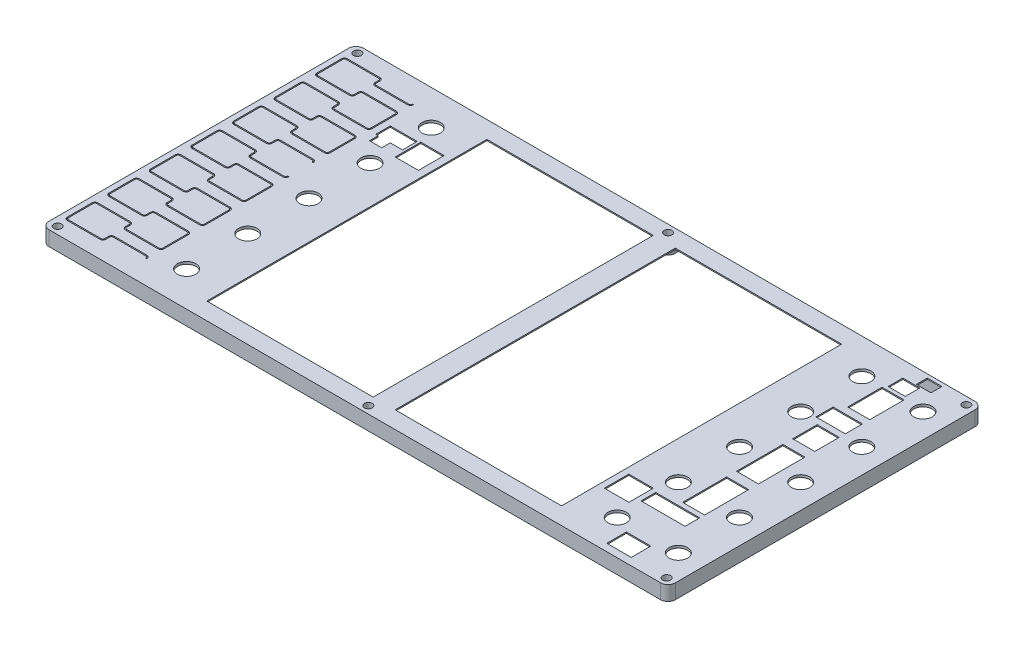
SolidWorks part; units mm, degrees
ref_plane "Front" through (0, 0, 0) normal (0, 0, 1) x (1, 0, 0)
ref_plane "Top" through (0, 0, 0) normal (0, 1, 0) x (1, 0, 0)
ref_plane "Right" through (0, 0, 0) normal (1, 0, 0) x (0, 0, -1)
sketch "Sketch5" plane through (0, 0, 0) normal (0, 1, 0) x (1, 0, 0)
  line L0 (221, -14.25) -> (246, -14.25) construction
  line L1 (246, -14.25) -> (246, -25.7701) construction
  line L7 (128, -64.25) -> (221, -64.25) construction
  line L32 (3, 0) -> (253, 0)
  line L33 (256, -3) -> (256, -125.5)
  line L42 (0, -3) -> (0, -125.5)
  line L44 (253, -128.5) -> (3, -128.5)
  line L117 (128, 0) -> (128, -64.25) construction
  line L118 (3.54, -3) -> (252.46, -3) construction
  line L119 (3.54, -3) -> (3.54, -125.5) construction
  line L120 (3.54, -125.5) -> (252.46, -125.5) construction
  line L121 (252.46, -3) -> (252.46, -125.5) construction
  line L122 (3.54, -3) -> (252.46, -125.5) construction
  line L123 (3.54, -125.5) -> (252.46, -3) construction
  line L124 (128, -64.25) -> (128, -128.5) construction
  line L125 (221, -14.25) -> (221, -39.25) construction
  line L126 (221, -39.25) -> (221, -64.25) construction
  arc A27 (256, -125.5) -> (253, -128.5) centre (253, -125.5) cw
  arc A28 (253, 0) -> (256, -3) centre (253, -3) cw
  circle A29 centre (3.54, -3) radius 1.6
  arc A30 (0, -125.5) -> (3, -128.5) centre (3, -125.5) ccw
  circle A31 centre (3.54, -125.5) radius 1.6
  circle A32 centre (252.46, -3) radius 1.6
  arc A33 (3, 0) -> (0, -3) centre (3, -3) ccw
  circle A82 centre (221, -14.25) radius 0.5 construction
  circle A85 centre (221, -39.25) radius 0.5 construction
  circle A86 centre (221, -64.25) radius 0.5 construction
  circle A93 centre (252.46, -125.5) radius 1.6
  point P33 (128, -64.25)
  point P350 (75, -64.25)
  dimension "D3" = 25
  dimension "D4" = 10
  dimension "D5" = 3
  dimension "D9" = 3.2
  dimension "D12" = 25
  dimension "D11" = 1
  dimension "D2" = 35
  dimension "D6" = 256
  dimension "D7" = 248.92
  dimension "D8" = 122.5
  dimension "D10" = 128.5
extrude "Boss-Extrude1" add sketch "Sketch5" along normal blind 1.6
sketch "Sketch23" plane through (0, 1.6, 0) normal (0, 1, 0) x (1, 0, 0)
  line L0 (221, -14.25) -> (221, -6.25) construction
  line L1 (219.5, -6.25) -> (222.5, -6.25) construction
  line L2 (219.5, -5.5) -> (222.5, -5.5)
  line L3 (219.5, -7) -> (222.5, -7)
  circle A10 centre (221, -14.25) radius 3.75
  arc A11 (219.5, -5.5) -> (219.5, -7) centre (219.5, -6.25) ccw
  arc A12 (222.5, -7) -> (222.5, -5.5) centre (222.5, -6.25) ccw
  point P5 (221, -6.25)
  dimension "D2" = 8
  dimension "D1" = 7.5
  dimension "D3" = 1.5
  dimension "D4" = 3
extrude "Cut-Extrude15" cut sketch "Sketch23" against normal through all both and the other way through all
pattern_linear "LPattern1" count 5 spacing 25 along (0, 0, 1) count 2 spacing 25 along (1, 0, 0) of "Cut-Extrude15"
sketch "Sketch24" plane through (0, 1.6, 0) normal (0, 1, 0) x (1, 0, 0)
  line L0 (16.5, -13.25) -> (37.9256, -13.25) construction
  line L1 (2.5, -7.25) -> (16.5, -7.25)
  line L2 (2.5, -7.25) -> (2.5, -19.25)
  line L3 (2.5, -19.25) -> (16.5, -19.25)
  line L4 (16.5, -7.25) -> (16.5, -19.25)
  line L6 (0, -3) -> (0, -125.5) construction
  line L7 (9.5, -19.25) -> (9.5, -24.25) construction
  line L8 (19, -15.75) -> (33, -15.75)
  line L9 (19, -15.75) -> (19, -27.75)
  line L10 (19, -27.75) -> (33, -27.75)
  line L11 (33, -15.75) -> (33, -27.75)
  line L12 (2.5, -24.25) -> (16.5, -24.25)
  line L13 (2.5, -24.25) -> (2.5, -36.25)
  line L14 (2.5, -36.25) -> (16.5, -36.25)
  line L15 (16.5, -24.25) -> (16.5, -36.25)
  line L16 (9.5, -21.75) -> (19, -21.75) construction
  line L17 (9.5, -36.25) -> (9.5, -41.25) construction
  line L18 (9.5, -38.75) -> (14.9669, -38.75) construction
  line L19 (2.5, -41.25) -> (16.5, -41.25)
  line L20 (9.5, -58.25) -> (9.5, -53.25) construction
  line L21 (9.5, -55.75) -> (19, -55.75) construction
  line L22 (16.5, -53.25) -> (16.5, -41.25)
  line L23 (2.5, -53.25) -> (2.5, -41.25)
  line L24 (2.5, -53.25) -> (16.5, -53.25)
  line L25 (2.5, -58.25) -> (16.5, -58.25)
  line L26 (2.5, -70.25) -> (2.5, -58.25)
  line L27 (16.5, -70.25) -> (16.5, -58.25)
  line L28 (2.5, -70.25) -> (16.5, -70.25)
  line L29 (2.5, -64.25) -> (16.5, -64.25) construction
  line L30 (2.5, -121.25) -> (2.5, -109.25)
  line L31 (2.5, -121.25) -> (16.5, -121.25)
  line L32 (16.5, -121.25) -> (16.5, -109.25)
  line L33 (2.5, -109.25) -> (16.5, -109.25)
  line L34 (2.5, -104.25) -> (16.5, -104.25)
  line L35 (16.5, -104.25) -> (16.5, -92.25)
  line L36 (2.5, -92.25) -> (16.5, -92.25)
  line L37 (2.5, -104.25) -> (2.5, -92.25)
  line L38 (2.5, -75.25) -> (2.5, -87.25)
  line L39 (2.5, -87.25) -> (16.5, -87.25)
  line L40 (16.5, -75.25) -> (16.5, -87.25)
  line L41 (2.5, -75.25) -> (16.5, -75.25)
  line L43 (16.5, -30.25) -> (24.4036, -30.25) construction
  line L44 (19, -32.75) -> (33, -32.75)
  line L45 (33, -44.75) -> (33, -32.75)
  line L46 (19, -44.75) -> (33, -44.75)
  line L47 (19, -44.75) -> (19, -32.75)
  line L48 (19, -95.75) -> (19, -83.75)
  line L49 (19, -95.75) -> (33, -95.75)
  line L50 (33, -95.75) -> (33, -83.75)
  line L51 (19, -83.75) -> (33, -83.75)
  line L52 (33, -66.75) -> (33, -78.75)
  line L53 (19, -66.75) -> (33, -66.75)
  line L54 (19, -66.75) -> (19, -78.75)
  line L55 (19, -78.75) -> (33, -78.75)
  line L56 (33, -89.75) -> (23.2986, -89.75) construction
  line L57 (19, -112.75) -> (33, -112.75)
  line L58 (19, -112.75) -> (19, -100.75)
  line L59 (19, -100.75) -> (33, -100.75)
  line L60 (33, -112.75) -> (33, -100.75)
  line L61 (253, 0) -> (3, 0) construction
  dimension "D1" = 12
  dimension "D2" = 7.25
  dimension "D3" = 2.5
  dimension "D4" = 14
  dimension "D5" = 5
  dimension "D6" = 2.5
sketch "Sketch25" plane through (0, 1.6, 0) normal (0, 1, 0) x (1, 0, 0)
  line L0 (3.5, -19.25) -> (16.75, -19.25) construction
  line L1 (17.75, -18.25) -> (17.75, -16.75) construction
  line L2 (2.5, -18.25) -> (2.5, -13.25) construction
  line L3 (18.75, -15.75) -> (32, -15.75) construction
  line L4 (9.5, -21.75) -> (33, -21.75) construction
  line L5 (33, -15.75) -> (33, -27.75) construction
  line L6 (33, -21.75) -> (33, -16.75) construction
  line L7 (9.5, -21.75) -> (2.5, -21.75) construction
  line L8 (33.25, -21.75) -> (33.25, -16.75)
  line L9 (17.75, -17.5) -> (2.5, -17.5) construction
  line L10 (2.5, -7.25) -> (2.5, -19.25) construction
  line L11 (17.75, -17.5) -> (33, -17.5) construction
  line L12 (18.75, -15.5) -> (32, -15.5)
  line L13 (17.5, -18.25) -> (17.5, -16.75)
  line L14 (3.5, -19) -> (16.75, -19)
  line L15 (2.75, -18.25) -> (2.75, -13.25)
  line L16 (32.75, -21.75) -> (32.75, -16.75)
  line L17 (18.75, -16) -> (32, -16)
  line L18 (18, -18.25) -> (18, -16.75)
  line L19 (3.5, -19.5) -> (16.75, -19.5)
  line L20 (2.25, -18.25) -> (2.25, -13.25)
  line L21 (32.75, -21.75) -> (32.75, -26.75)
  line L22 (33.25, -21.75) -> (33.25, -26.75)
  line L23 (18.75, -28) -> (32, -28)
  line L24 (18.75, -27.5) -> (32, -27.5)
  line L25 (17.5, -25.25) -> (17.5, -26.75)
  line L26 (18, -25.25) -> (18, -26.75)
  line L27 (3.5, -24) -> (16.75, -24)
  line L28 (3.5, -24.5) -> (16.75, -24.5)
  line L29 (2.75, -25.25) -> (2.75, -35.25)
  line L30 (2.25, -25.25) -> (2.25, -35.25)
  line L31 (24.4036, -30.25) -> (15.6842, -30.25) construction
  line L32 (17.75, -43) -> (33, -43) construction
  line L33 (17.75, -43) -> (2.5, -43) construction
  line L34 (9.5, -38.75) -> (2.5, -38.75) construction
  line L35 (33, -38.75) -> (33, -43.75) construction
  line L36 (9.5, -38.75) -> (33, -38.75) construction
  line L37 (18.75, -44.75) -> (32, -44.75) construction
  line L38 (2.5, -42.25) -> (2.5, -47.25) construction
  line L39 (17.75, -42.25) -> (17.75, -43.75) construction
  line L40 (3.5, -41.25) -> (16.75, -41.25) construction
  line L41 (3.5, -36) -> (16.75, -36)
  line L42 (3.5, -36.5) -> (16.75, -36.5)
  line L43 (18, -35.25) -> (18, -33.75)
  line L44 (17.5, -35.25) -> (17.5, -33.75)
  line L45 (18.75, -33) -> (32, -33)
  line L46 (18.75, -32.5) -> (32, -32.5)
  line L47 (33.25, -38.75) -> (33.25, -33.75)
  line L48 (32.75, -38.75) -> (32.75, -33.75)
  line L49 (2.25, -42.25) -> (2.25, -47.25)
  line L50 (3.5, -41) -> (16.75, -41)
  line L51 (18, -42.25) -> (18, -43.75)
  line L52 (18.75, -44.5) -> (32, -44.5)
  line L53 (32.75, -38.75) -> (32.75, -43.75)
  line L54 (2.75, -42.25) -> (2.75, -47.25)
  line L55 (3.5, -41.5) -> (16.75, -41.5)
  line L56 (17.5, -42.25) -> (17.5, -43.75)
  line L57 (18.75, -45) -> (32, -45)
  line L58 (33.25, -38.75) -> (33.25, -43.75)
  line L59 (16.5, -13.25) -> (12.4888, -13.25) construction
  line L60 (16.5, -7.25) -> (16.5, -19.25) construction
  line L61 (18.75, -10.5) -> (32, -10.5)
  line L62 (18.75, -11) -> (32, -11)
  line L63 (18, -8.25) -> (18, -9.75)
  line L64 (17.5, -8.25) -> (17.5, -9.75)
  line L65 (3.5, -7) -> (16.75, -7)
  line L66 (3.5, -7.5) -> (16.75, -7.5)
  line L67 (2.75, -8.25) -> (2.75, -13.25)
  line L68 (2.25, -8.25) -> (2.25, -13.25)
  arc A0 (16.75, -19.25) -> (17.75, -18.25) centre (16.75, -18.25) ccw construction
  arc A1 (17.75, -16.75) -> (18.75, -15.75) centre (18.75, -16.75) cw construction
  arc A2 (32, -15.75) -> (33, -16.75) centre (32, -16.75) cw construction
  arc A3 (3.5, -19.25) -> (2.5, -18.25) centre (3.5, -18.25) cw construction
  arc A4 (32, -15.5) -> (33.25, -16.75) centre (32, -16.75) cw
  arc A5 (17.5, -16.75) -> (18.75, -15.5) centre (18.75, -16.75) cw
  arc A6 (16.75, -19) -> (17.5, -18.25) centre (16.75, -18.25) ccw
  arc A7 (3.5, -19) -> (2.75, -18.25) centre (3.5, -18.25) cw
  arc A8 (32, -16) -> (32.75, -16.75) centre (32, -16.75) cw
  arc A9 (18, -16.75) -> (18.75, -16) centre (18.75, -16.75) cw
  arc A10 (16.75, -19.5) -> (18, -18.25) centre (16.75, -18.25) ccw
  arc A11 (3.5, -19.5) -> (2.25, -18.25) centre (3.5, -18.25) cw
  arc A12 (32, -28) -> (33.25, -26.75) centre (32, -26.75) ccw
  arc A13 (32, -27.5) -> (32.75, -26.75) centre (32, -26.75) ccw
  arc A14 (18, -26.75) -> (18.75, -27.5) centre (18.75, -26.75) ccw
  arc A15 (17.5, -26.75) -> (18.75, -28) centre (18.75, -26.75) ccw
  arc A16 (16.75, -24.5) -> (17.5, -25.25) centre (16.75, -25.25) cw
  arc A17 (16.75, -24) -> (18, -25.25) centre (16.75, -25.25) cw
  arc A18 (3.5, -24.5) -> (2.75, -25.25) centre (3.5, -25.25) ccw
  arc A19 (3.5, -24) -> (2.25, -25.25) centre (3.5, -25.25) ccw
  arc A20 (3.5, -41.25) -> (2.5, -42.25) centre (3.5, -42.25) ccw construction
  arc A21 (32, -44.75) -> (33, -43.75) centre (32, -43.75) ccw construction
  arc A22 (17.75, -43.75) -> (18.75, -44.75) centre (18.75, -43.75) ccw construction
  arc A23 (16.75, -41.25) -> (17.75, -42.25) centre (16.75, -42.25) cw construction
  arc A24 (3.5, -36.5) -> (2.25, -35.25) centre (3.5, -35.25) cw
  arc A25 (3.5, -36) -> (2.75, -35.25) centre (3.5, -35.25) cw
  arc A26 (16.75, -36.5) -> (18, -35.25) centre (16.75, -35.25) ccw
  arc A27 (16.75, -36) -> (17.5, -35.25) centre (16.75, -35.25) ccw
  arc A28 (17.5, -33.75) -> (18.75, -32.5) centre (18.75, -33.75) cw
  arc A29 (18, -33.75) -> (18.75, -33) centre (18.75, -33.75) cw
  arc A30 (32, -33) -> (32.75, -33.75) centre (32, -33.75) cw
  arc A31 (32, -32.5) -> (33.25, -33.75) centre (32, -33.75) cw
  arc A32 (3.5, -41) -> (2.25, -42.25) centre (3.5, -42.25) ccw
  arc A33 (16.75, -41) -> (18, -42.25) centre (16.75, -42.25) cw
  arc A34 (18, -43.75) -> (18.75, -44.5) centre (18.75, -43.75) ccw
  arc A35 (32, -44.5) -> (32.75, -43.75) centre (32, -43.75) ccw
  arc A36 (3.5, -41.5) -> (2.75, -42.25) centre (3.5, -42.25) ccw
  arc A37 (16.75, -41.5) -> (17.5, -42.25) centre (16.75, -42.25) cw
  arc A38 (17.5, -43.75) -> (18.75, -45) centre (18.75, -43.75) ccw
  arc A39 (32, -45) -> (33.25, -43.75) centre (32, -43.75) ccw
  arc A40 (32, -11) -> (33.25, -9.75) centre (32, -9.75) ccw
  arc A41 (32, -10.5) -> (32.75, -9.75) centre (32, -9.75) ccw
  arc A42 (17.5, -9.75) -> (18.75, -11) centre (18.75, -9.75) ccw
  arc A43 (18, -9.75) -> (18.75, -10.5) centre (18.75, -9.75) ccw
  arc A44 (16.75, -7.5) -> (17.5, -8.25) centre (16.75, -8.25) cw
  arc A45 (16.75, -7) -> (18, -8.25) centre (16.75, -8.25) cw
  arc A46 (3.5, -7.5) -> (2.75, -8.25) centre (3.5, -8.25) ccw
  arc A47 (3.5, -7) -> (2.25, -8.25) centre (3.5, -8.25) ccw
  point P21 (33, -15.75)
  point P24 (2.5, -19.25)
  point P86 (2.75, -30.25)
  point P87 (2.25, -30.25)
  point P147 (2.5, -41.25)
  point P148 (33, -44.75)
  dimension "D1" = 1
  dimension "D2" = 1
  dimension "D3" = 1
  dimension "D4" = 0.25
  dimension "D5" = 0.25
sketch "Sketch26" plane through (0, 1.6, 0) normal (0, 1, 0) x (1, 0, 0)
  line L0 (18.75, -11) -> (32, -11) construction
  line L1 (18.75, -10.5) -> (32, -10.5) construction
  line L2 (18, -8.25) -> (18, -9.75) construction
  line L3 (17.5, -8.25) -> (17.5, -9.75) construction
  line L4 (3.5, -7) -> (16.75, -7) construction
  line L5 (3.5, -7.5) -> (16.75, -7.5) construction
  line L6 (2.25, -8.25) -> (2.25, -13.25) construction
  line L7 (2.75, -8.25) -> (2.75, -13.25) construction
  line L8 (2.25, -18.25) -> (2.25, -13.25) construction
  line L9 (2.75, -18.25) -> (2.75, -13.25) construction
  line L10 (3.5, -19.5) -> (16.75, -19.5) construction
  line L11 (3.5, -19) -> (16.75, -19) construction
  line L12 (17.5, -18.25) -> (17.5, -16.75) construction
  line L13 (18, -18.25) -> (18, -16.75) construction
  line L14 (18.75, -15.5) -> (32, -15.5) construction
  line L15 (18.75, -16) -> (32, -16) construction
  line L16 (32.75, -21.75) -> (32.75, -16.75) construction
  line L17 (33.25, -21.75) -> (33.25, -16.75) construction
  line L18 (33.25, -21.75) -> (33.25, -26.75) construction
  line L19 (32.75, -21.75) -> (32.75, -26.75) construction
  line L20 (18.75, -28) -> (32, -28) construction
  line L21 (18.75, -27.5) -> (32, -27.5) construction
  line L22 (18, -25.25) -> (18, -26.75) construction
  line L23 (17.5, -25.25) -> (17.5, -26.75) construction
  line L24 (3.5, -24.5) -> (16.75, -24.5) construction
  line L25 (3.5, -24) -> (16.75, -24) construction
  line L26 (2.25, -25.25) -> (2.25, -35.25) construction
  line L27 (2.75, -25.25) -> (2.75, -35.25) construction
  line L28 (3.5, -36.5) -> (16.75, -36.5) construction
  line L29 (3.5, -36) -> (16.75, -36) construction
  line L30 (17.5, -35.25) -> (17.5, -33.75) construction
  line L31 (18, -35.25) -> (18, -33.75) construction
  line L32 (18.75, -32.5) -> (32, -32.5) construction
  line L33 (18.75, -33) -> (32, -33) construction
  line L34 (32.75, -38.75) -> (32.75, -33.75) construction
  line L35 (33.25, -38.75) -> (33.25, -33.75) construction
  line L36 (32.75, -38.75) -> (32.75, -43.75) construction
  line L37 (33.25, -38.75) -> (33.25, -43.75) construction
  line L38 (18.75, -45) -> (32, -45) construction
  line L39 (18.75, -44.5) -> (32, -44.5) construction
  line L40 (18, -42.25) -> (18, -43.75) construction
  line L41 (17.5, -42.25) -> (17.5, -43.75) construction
  line L42 (3.5, -41) -> (16.75, -41) construction
  line L43 (3.5, -41.5) -> (16.75, -41.5) construction
  line L44 (2.25, -42.25) -> (2.25, -47.25) construction
  line L45 (2.75, -42.25) -> (2.75, -47.25) construction
  line L46 (18.75, -11) -> (32, -11)
  line L47 (18.75, -10.5) -> (32, -10.5)
  line L48 (18, -8.25) -> (18, -9.75)
  line L49 (17.5, -8.25) -> (17.5, -9.75)
  line L50 (3.5, -7) -> (16.75, -7)
  line L51 (3.5, -7.5) -> (16.75, -7.5)
  line L52 (2.25, -8.25) -> (2.25, -13.25)
  line L53 (2.75, -8.25) -> (2.75, -13.25)
  line L54 (2.25, -18.25) -> (2.25, -13.25)
  line L55 (2.75, -18.25) -> (2.75, -13.25)
  line L56 (3.5, -19.5) -> (16.75, -19.5)
  line L57 (3.5, -19) -> (16.75, -19)
  line L58 (17.5, -18.25) -> (17.5, -16.75)
  line L59 (18, -18.25) -> (18, -16.75)
  line L60 (18.75, -15.5) -> (32, -15.5)
  line L61 (18.75, -16) -> (32, -16)
  line L62 (32.75, -21.75) -> (32.75, -16.75)
  line L63 (33.25, -21.75) -> (33.25, -16.75)
  line L64 (33.25, -21.75) -> (33.25, -26.75)
  line L65 (32.75, -21.75) -> (32.75, -26.75)
  line L66 (18.75, -28) -> (32, -28)
  line L67 (18.75, -27.5) -> (32, -27.5)
  line L68 (18, -25.25) -> (18, -26.75)
  line L69 (17.5, -25.25) -> (17.5, -26.75)
  line L70 (3.5, -24.5) -> (16.75, -24.5)
  line L71 (3.5, -24) -> (16.75, -24)
  line L72 (2.25, -25.25) -> (2.25, -35.25)
  line L73 (2.75, -25.25) -> (2.75, -35.25)
  line L74 (3.5, -36.5) -> (16.75, -36.5)
  line L75 (3.5, -36) -> (16.75, -36)
  line L76 (17.5, -35.25) -> (17.5, -33.75)
  line L77 (18, -35.25) -> (18, -33.75)
  line L78 (18.75, -32.5) -> (32, -32.5)
  line L79 (18.75, -33) -> (32, -33)
  line L80 (32.75, -38.75) -> (32.75, -33.75)
  line L81 (33.25, -38.75) -> (33.25, -33.75)
  line L82 (32.75, -38.75) -> (32.75, -43.75)
  line L83 (33.25, -38.75) -> (33.25, -43.75)
  line L84 (18.75, -45) -> (32, -45)
  line L85 (18.75, -44.5) -> (32, -44.5)
  line L86 (18, -42.25) -> (18, -43.75)
  line L87 (17.5, -42.25) -> (17.5, -43.75)
  line L88 (3.5, -41) -> (16.75, -41)
  line L89 (3.5, -41.5) -> (16.75, -41.5)
  line L90 (2.25, -42.25) -> (2.25, -52.25)
  line L91 (2.75, -42.25) -> (2.75, -52.25)
  line L92 (32.75, -9.75) -> (33.25, -9.75)
  line L93 (2.75, -47.25) -> (8.2598, -47.25) construction
  line L94 (18.75, -50) -> (32, -50)
  line L95 (18.75, -49.5) -> (32, -49.5)
  line L96 (18, -52.25) -> (18, -50.75)
  line L97 (17.5, -52.25) -> (17.5, -50.75)
  line L98 (3.5, -53.5) -> (16.75, -53.5)
  line L99 (3.5, -53) -> (16.75, -53)
  line L100 (9.5, -55.75) -> (19, -55.75) construction
  line L101 (2.75, -64.25) -> (8.2598, -64.25) construction
  line L102 (3.5, -58.5) -> (16.75, -58.5)
  line L103 (3.5, -58) -> (16.75, -58)
  line L104 (17.5, -59.25) -> (17.5, -60.75)
  line L105 (18, -59.25) -> (18, -60.75)
  line L106 (18.75, -62) -> (32, -62)
  line L107 (18.75, -61.5) -> (32, -61.5)
  line L108 (32.75, -101.75) -> (33.25, -101.75) construction
  line L109 (2.75, -69.25) -> (2.75, -59.25)
  line L110 (2.25, -69.25) -> (2.25, -59.25)
  line L111 (3.5, -70) -> (16.75, -70)
  line L112 (3.5, -70.5) -> (16.75, -70.5)
  line L113 (17.5, -69.25) -> (17.5, -67.75)
  line L114 (18, -69.25) -> (18, -67.75)
  line L115 (18.75, -67) -> (32, -67)
  line L116 (18.75, -66.5) -> (32, -66.5)
  line L117 (33.25, -72.75) -> (33.25, -67.75)
  line L118 (32.75, -72.75) -> (32.75, -67.75)
  line L119 (33.25, -72.75) -> (33.25, -77.75)
  line L120 (32.75, -72.75) -> (32.75, -77.75)
  line L121 (18.75, -78.5) -> (32, -78.5)
  line L122 (18.75, -79) -> (32, -79)
  line L123 (18, -76.25) -> (18, -77.75)
  line L124 (17.5, -76.25) -> (17.5, -77.75)
  line L125 (3.5, -75.5) -> (16.75, -75.5)
  line L126 (3.5, -75) -> (16.75, -75)
  line L127 (2.75, -86.25) -> (2.75, -76.25)
  line L128 (2.25, -86.25) -> (2.25, -76.25)
  line L129 (3.5, -87.5) -> (16.75, -87.5)
  line L130 (3.5, -87) -> (16.75, -87)
  line L131 (17.5, -86.25) -> (17.5, -84.75)
  line L132 (18, -86.25) -> (18, -84.75)
  line L133 (18.75, -84) -> (32, -84)
  line L134 (18.75, -83.5) -> (32, -83.5)
  line L135 (32.75, -89.75) -> (32.75, -84.75)
  line L136 (33.25, -89.75) -> (33.25, -84.75)
  line L137 (33.25, -89.75) -> (33.25, -94.75)
  line L138 (32.75, -89.75) -> (32.75, -94.75)
  line L139 (18.75, -95.5) -> (32, -95.5)
  line L140 (18.75, -96) -> (32, -96)
  line L141 (18, -93.25) -> (18, -94.75)
  line L142 (17.5, -93.25) -> (17.5, -94.75)
  line L143 (3.5, -92.5) -> (16.75, -92.5)
  line L144 (3.5, -92) -> (16.75, -92)
  line L145 (2.75, -93.25) -> (2.75, -98.25)
  line L146 (2.25, -93.25) -> (2.25, -98.25)
  line L147 (2.75, -103.25) -> (2.75, -98.25)
  line L148 (2.25, -103.25) -> (2.25, -98.25)
  line L149 (3.5, -104) -> (16.75, -104)
  line L150 (3.5, -104.5) -> (16.75, -104.5)
  line L151 (17.5, -103.25) -> (17.5, -101.75)
  line L152 (18, -103.25) -> (18, -101.75)
  line L153 (18.75, -101) -> (32, -101)
  line L154 (18.75, -100.5) -> (32, -100.5)
  line L155 (19, -106.75) -> (26.9903, -106.75) construction
  line L156 (19, -112.75) -> (19, -100.75) construction
  line L157 (18.75, -118) -> (32, -118)
  line L158 (18.75, -117.5) -> (32, -117.5)
  line L159 (18, -120.25) -> (18, -118.75)
  line L160 (17.5, -120.25) -> (17.5, -118.75)
  line L161 (3.5, -121.5) -> (16.75, -121.5)
  line L162 (3.5, -121) -> (16.75, -121)
  line L163 (2.25, -120.25) -> (2.25, -115.25)
  line L164 (2.75, -120.25) -> (2.75, -115.25)
  line L165 (2.75, -110.25) -> (2.75, -115.25)
  line L166 (2.25, -110.25) -> (2.25, -115.25)
  line L167 (18.75, -112.5) -> (32, -112.5)
  line L168 (18.75, -113) -> (32, -113)
  line L169 (18, -110.25) -> (18, -111.75)
  line L170 (17.5, -110.25) -> (17.5, -111.75)
  line L171 (3.5, -109.5) -> (16.75, -109.5)
  line L172 (3.5, -109) -> (16.75, -109)
  line L173 (33.25, -101.75) -> (33.25, -111.75)
  line L174 (32.75, -101.75) -> (32.75, -111.75)
  line L175 (32.75, -118.75) -> (33.25, -118.75)
  line L176 (32.75, -50.75) -> (33.25, -50.75)
  line L177 (32.75, -60.75) -> (33.25, -60.75)
  arc A0 (32, -10.5) -> (32.75, -9.75) centre (32, -9.75) ccw construction
  arc A1 (32, -11) -> (33.25, -9.75) centre (32, -9.75) ccw construction
  arc A2 (18, -9.75) -> (18.75, -10.5) centre (18.75, -9.75) ccw construction
  arc A3 (17.5, -9.75) -> (18.75, -11) centre (18.75, -9.75) ccw construction
  arc A4 (17.5, -8.25) -> (16.75, -7.5) centre (16.75, -8.25) ccw construction
  arc A5 (18, -8.25) -> (16.75, -7) centre (16.75, -8.25) ccw construction
  arc A6 (3.5, -7.5) -> (2.75, -8.25) centre (3.5, -8.25) ccw construction
  arc A7 (3.5, -7) -> (2.25, -8.25) centre (3.5, -8.25) ccw construction
  arc A8 (2.75, -18.25) -> (3.5, -19) centre (3.5, -18.25) ccw construction
  arc A9 (2.25, -18.25) -> (3.5, -19.5) centre (3.5, -18.25) ccw construction
  arc A10 (16.75, -19.5) -> (18, -18.25) centre (16.75, -18.25) ccw construction
  arc A11 (16.75, -19) -> (17.5, -18.25) centre (16.75, -18.25) ccw construction
  arc A12 (18.75, -16) -> (18, -16.75) centre (18.75, -16.75) ccw construction
  arc A13 (18.75, -15.5) -> (17.5, -16.75) centre (18.75, -16.75) ccw construction
  arc A14 (32.75, -16.75) -> (32, -16) centre (32, -16.75) ccw construction
  arc A15 (33.25, -16.75) -> (32, -15.5) centre (32, -16.75) ccw construction
  arc A16 (32, -27.5) -> (32.75, -26.75) centre (32, -26.75) ccw construction
  arc A17 (32, -28) -> (33.25, -26.75) centre (32, -26.75) ccw construction
  arc A18 (17.5, -26.75) -> (18.75, -28) centre (18.75, -26.75) ccw construction
  arc A19 (18, -26.75) -> (18.75, -27.5) centre (18.75, -26.75) ccw construction
  arc A20 (17.5, -25.25) -> (16.75, -24.5) centre (16.75, -25.25) ccw construction
  arc A21 (18, -25.25) -> (16.75, -24) centre (16.75, -25.25) ccw construction
  arc A22 (3.5, -24) -> (2.25, -25.25) centre (3.5, -25.25) ccw construction
  arc A23 (3.5, -24.5) -> (2.75, -25.25) centre (3.5, -25.25) ccw construction
  arc A24 (2.75, -35.25) -> (3.5, -36) centre (3.5, -35.25) ccw construction
  arc A25 (2.25, -35.25) -> (3.5, -36.5) centre (3.5, -35.25) ccw construction
  arc A26 (16.75, -36.5) -> (18, -35.25) centre (16.75, -35.25) ccw construction
  arc A27 (16.75, -36) -> (17.5, -35.25) centre (16.75, -35.25) ccw construction
  arc A28 (18.75, -33) -> (18, -33.75) centre (18.75, -33.75) ccw construction
  arc A29 (18.75, -32.5) -> (17.5, -33.75) centre (18.75, -33.75) ccw construction
  arc A30 (33.25, -33.75) -> (32, -32.5) centre (32, -33.75) ccw construction
  arc A31 (32.75, -33.75) -> (32, -33) centre (32, -33.75) ccw construction
  arc A32 (32, -44.5) -> (32.75, -43.75) centre (32, -43.75) ccw construction
  arc A33 (32, -45) -> (33.25, -43.75) centre (32, -43.75) ccw construction
  arc A34 (18, -43.75) -> (18.75, -44.5) centre (18.75, -43.75) ccw construction
  arc A35 (17.5, -43.75) -> (18.75, -45) centre (18.75, -43.75) ccw construction
  arc A36 (17.5, -42.25) -> (16.75, -41.5) centre (16.75, -42.25) ccw construction
  arc A37 (18, -42.25) -> (16.75, -41) centre (16.75, -42.25) ccw construction
  arc A38 (3.5, -41.5) -> (2.75, -42.25) centre (3.5, -42.25) ccw construction
  arc A39 (3.5, -41) -> (2.25, -42.25) centre (3.5, -42.25) ccw construction
  arc A40 (32, -10.5) -> (32.75, -9.75) centre (32, -9.75) ccw
  arc A41 (32, -11) -> (33.25, -9.75) centre (32, -9.75) ccw
  arc A42 (18, -9.75) -> (18.75, -10.5) centre (18.75, -9.75) ccw
  arc A43 (17.5, -9.75) -> (18.75, -11) centre (18.75, -9.75) ccw
  arc A44 (17.5, -8.25) -> (16.75, -7.5) centre (16.75, -8.25) ccw
  arc A45 (18, -8.25) -> (16.75, -7) centre (16.75, -8.25) ccw
  arc A46 (3.5, -7.5) -> (2.75, -8.25) centre (3.5, -8.25) ccw
  arc A47 (3.5, -7) -> (2.25, -8.25) centre (3.5, -8.25) ccw
  arc A48 (2.75, -18.25) -> (3.5, -19) centre (3.5, -18.25) ccw
  arc A49 (2.25, -18.25) -> (3.5, -19.5) centre (3.5, -18.25) ccw
  arc A50 (16.75, -19.5) -> (18, -18.25) centre (16.75, -18.25) ccw
  arc A51 (16.75, -19) -> (17.5, -18.25) centre (16.75, -18.25) ccw
  arc A52 (18.75, -16) -> (18, -16.75) centre (18.75, -16.75) ccw
  arc A53 (18.75, -15.5) -> (17.5, -16.75) centre (18.75, -16.75) ccw
  arc A54 (32.75, -16.75) -> (32, -16) centre (32, -16.75) ccw
  arc A55 (33.25, -16.75) -> (32, -15.5) centre (32, -16.75) ccw
  arc A56 (32, -27.5) -> (32.75, -26.75) centre (32, -26.75) ccw
  arc A57 (32, -28) -> (33.25, -26.75) centre (32, -26.75) ccw
  arc A58 (17.5, -26.75) -> (18.75, -28) centre (18.75, -26.75) ccw
  arc A59 (18, -26.75) -> (18.75, -27.5) centre (18.75, -26.75) ccw
  arc A60 (17.5, -25.25) -> (16.75, -24.5) centre (16.75, -25.25) ccw
  arc A61 (18, -25.25) -> (16.75, -24) centre (16.75, -25.25) ccw
  arc A62 (3.5, -24) -> (2.25, -25.25) centre (3.5, -25.25) ccw
  arc A63 (3.5, -24.5) -> (2.75, -25.25) centre (3.5, -25.25) ccw
  arc A64 (2.75, -35.25) -> (3.5, -36) centre (3.5, -35.25) ccw
  arc A65 (2.25, -35.25) -> (3.5, -36.5) centre (3.5, -35.25) ccw
  arc A66 (16.75, -36.5) -> (18, -35.25) centre (16.75, -35.25) ccw
  arc A67 (16.75, -36) -> (17.5, -35.25) centre (16.75, -35.25) ccw
  arc A68 (18.75, -33) -> (18, -33.75) centre (18.75, -33.75) ccw
  arc A69 (18.75, -32.5) -> (17.5, -33.75) centre (18.75, -33.75) ccw
  arc A70 (33.25, -33.75) -> (32, -32.5) centre (32, -33.75) ccw
  arc A71 (32.75, -33.75) -> (32, -33) centre (32, -33.75) ccw
  arc A72 (32, -44.5) -> (32.75, -43.75) centre (32, -43.75) ccw
  arc A73 (32, -45) -> (33.25, -43.75) centre (32, -43.75) ccw
  arc A74 (18, -43.75) -> (18.75, -44.5) centre (18.75, -43.75) ccw
  arc A75 (17.5, -43.75) -> (18.75, -45) centre (18.75, -43.75) ccw
  arc A76 (17.5, -42.25) -> (16.75, -41.5) centre (16.75, -42.25) ccw
  arc A77 (18, -42.25) -> (16.75, -41) centre (16.75, -42.25) ccw
  arc A78 (3.5, -41.5) -> (2.75, -42.25) centre (3.5, -42.25) ccw
  arc A79 (3.5, -41) -> (2.25, -42.25) centre (3.5, -42.25) ccw
  arc A80 (32, -49.5) -> (33.25, -50.75) centre (32, -50.75) cw
  arc A81 (32, -50) -> (32.75, -50.75) centre (32, -50.75) cw
  arc A82 (18, -50.75) -> (18.75, -50) centre (18.75, -50.75) cw
  arc A83 (17.5, -50.75) -> (18.75, -49.5) centre (18.75, -50.75) cw
  arc A84 (18, -52.25) -> (16.75, -53.5) centre (16.75, -52.25) cw
  arc A85 (17.5, -52.25) -> (16.75, -53) centre (16.75, -52.25) cw
  arc A86 (3.5, -53) -> (2.75, -52.25) centre (3.5, -52.25) cw
  arc A87 (3.5, -53.5) -> (2.25, -52.25) centre (3.5, -52.25) cw
  arc A88 (3.5, -58) -> (2.25, -59.25) centre (3.5, -59.25) ccw
  arc A89 (3.5, -58.5) -> (2.75, -59.25) centre (3.5, -59.25) ccw
  arc A90 (17.5, -59.25) -> (16.75, -58.5) centre (16.75, -59.25) ccw
  arc A91 (18, -59.25) -> (16.75, -58) centre (16.75, -59.25) ccw
  arc A92 (17.5, -60.75) -> (18.75, -62) centre (18.75, -60.75) ccw
  arc A93 (18, -60.75) -> (18.75, -61.5) centre (18.75, -60.75) ccw
  arc A94 (32, -61.5) -> (32.75, -60.75) centre (32, -60.75) ccw
  arc A95 (32, -62) -> (33.25, -60.75) centre (32, -60.75) ccw
  arc A96 (3.5, -70.5) -> (2.25, -69.25) centre (3.5, -69.25) cw
  arc A97 (3.5, -70) -> (2.75, -69.25) centre (3.5, -69.25) cw
  arc A98 (18, -69.25) -> (16.75, -70.5) centre (16.75, -69.25) cw
  arc A99 (17.5, -69.25) -> (16.75, -70) centre (16.75, -69.25) cw
  arc A100 (17.5, -67.75) -> (18.75, -66.5) centre (18.75, -67.75) cw
  arc A101 (18, -67.75) -> (18.75, -67) centre (18.75, -67.75) cw
  arc A102 (32, -66.5) -> (33.25, -67.75) centre (32, -67.75) cw
  arc A103 (32, -67) -> (32.75, -67.75) centre (32, -67.75) cw
  arc A104 (32.75, -77.75) -> (32, -78.5) centre (32, -77.75) cw
  arc A105 (33.25, -77.75) -> (32, -79) centre (32, -77.75) cw
  arc A106 (18.75, -79) -> (17.5, -77.75) centre (18.75, -77.75) cw
  arc A107 (18.75, -78.5) -> (18, -77.75) centre (18.75, -77.75) cw
  arc A108 (16.75, -75.5) -> (17.5, -76.25) centre (16.75, -76.25) cw
  arc A109 (16.75, -75) -> (18, -76.25) centre (16.75, -76.25) cw
  arc A110 (2.25, -76.25) -> (3.5, -75) centre (3.5, -76.25) cw
  arc A111 (2.75, -76.25) -> (3.5, -75.5) centre (3.5, -76.25) cw
  arc A112 (3.5, -87) -> (2.75, -86.25) centre (3.5, -86.25) cw
  arc A113 (3.5, -87.5) -> (2.25, -86.25) centre (3.5, -86.25) cw
  arc A114 (18, -86.25) -> (16.75, -87.5) centre (16.75, -86.25) cw
  arc A115 (17.5, -86.25) -> (16.75, -87) centre (16.75, -86.25) cw
  arc A116 (18, -84.75) -> (18.75, -84) centre (18.75, -84.75) cw
  arc A117 (17.5, -84.75) -> (18.75, -83.5) centre (18.75, -84.75) cw
  arc A118 (32, -83.5) -> (33.25, -84.75) centre (32, -84.75) cw
  arc A119 (32, -84) -> (32.75, -84.75) centre (32, -84.75) cw
  arc A120 (33.25, -94.75) -> (32, -96) centre (32, -94.75) cw
  arc A121 (32.75, -94.75) -> (32, -95.5) centre (32, -94.75) cw
  arc A122 (18.75, -96) -> (17.5, -94.75) centre (18.75, -94.75) cw
  arc A123 (18.75, -95.5) -> (18, -94.75) centre (18.75, -94.75) cw
  arc A124 (16.75, -92.5) -> (17.5, -93.25) centre (16.75, -93.25) cw
  arc A125 (16.75, -92) -> (18, -93.25) centre (16.75, -93.25) cw
  arc A126 (2.25, -93.25) -> (3.5, -92) centre (3.5, -93.25) cw
  arc A127 (2.75, -93.25) -> (3.5, -92.5) centre (3.5, -93.25) cw
  arc A128 (3.5, -104.5) -> (2.25, -103.25) centre (3.5, -103.25) cw
  arc A129 (3.5, -104) -> (2.75, -103.25) centre (3.5, -103.25) cw
  arc A130 (18, -103.25) -> (16.75, -104.5) centre (16.75, -103.25) cw
  arc A131 (17.5, -103.25) -> (16.75, -104) centre (16.75, -103.25) cw
  arc A132 (17.5, -101.75) -> (18.75, -100.5) centre (18.75, -101.75) cw
  arc A133 (18, -101.75) -> (18.75, -101) centre (18.75, -101.75) cw
  arc A134 (32, -100.5) -> (33.25, -101.75) centre (32, -101.75) cw
  arc A135 (32, -101) -> (32.75, -101.75) centre (32, -101.75) cw
  arc A136 (32.75, -118.75) -> (32, -118) centre (32, -118.75) ccw
  arc A137 (33.25, -118.75) -> (32, -117.5) centre (32, -118.75) ccw
  arc A138 (18.75, -118) -> (18, -118.75) centre (18.75, -118.75) ccw
  arc A139 (18.75, -117.5) -> (17.5, -118.75) centre (18.75, -118.75) ccw
  arc A140 (16.75, -121) -> (17.5, -120.25) centre (16.75, -120.25) ccw
  arc A141 (16.75, -121.5) -> (18, -120.25) centre (16.75, -120.25) ccw
  arc A142 (2.75, -120.25) -> (3.5, -121) centre (3.5, -120.25) ccw
  arc A143 (2.25, -120.25) -> (3.5, -121.5) centre (3.5, -120.25) ccw
  arc A144 (3.5, -109) -> (2.25, -110.25) centre (3.5, -110.25) ccw
  arc A145 (3.5, -109.5) -> (2.75, -110.25) centre (3.5, -110.25) ccw
  arc A146 (32, -113) -> (33.25, -111.75) centre (32, -111.75) ccw
  arc A147 (32, -112.5) -> (32.75, -111.75) centre (32, -111.75) ccw
  arc A148 (17.5, -111.75) -> (18.75, -113) centre (18.75, -111.75) ccw
  arc A149 (18, -111.75) -> (18.75, -112.5) centre (18.75, -111.75) ccw
  arc A150 (17.5, -110.25) -> (16.75, -109.5) centre (16.75, -110.25) ccw
  arc A151 (18, -110.25) -> (16.75, -109) centre (16.75, -110.25) ccw
extrude "Cut-Extrude16" cut sketch "Sketch26" against normal through all both and the other way through all
sketch "Sketch34" plane through (0, 1.6, 0) normal (0, 1, 0) x (1, 0, 0)
  line L0 (25.3618, -33.1343) -> (25.3618, -44.3343) construction
  line L1 (19.9618, -38.7343) -> (30.7618, -38.7343) construction
  line L2 (4.7053, -30.2601) -> (15.5053, -30.2601) construction
  line L3 (10.1053, -24.6601) -> (10.1053, -35.8601) construction
  line L4 (25.3278, -16.118) -> (25.3278, -27.318) construction
  line L5 (30.7278, -21.718) -> (19.9278, -21.718) construction
  line L6 (10.0989, -7.6462) -> (10.0989, -18.8462) construction
  line L7 (15.4989, -13.2462) -> (4.6989, -13.2462) construction
  line L8 (10.7056, -14.2595) -> (9.5056, -14.2595)
  line L9 (10.7056, -15.4595) -> (10.7056, -14.2595)
  line L10 (9.5056, -15.4595) -> (10.7056, -15.4595)
  line L11 (9.5056, -14.2595) -> (9.5056, -15.4595)
  line L12 (10.7056, -9.4595) -> (9.5056, -9.4595)
  line L13 (10.7056, -10.6595) -> (10.7056, -9.4595)
  line L14 (9.5056, -10.6595) -> (10.7056, -10.6595)
  line L15 (9.5056, -9.4595) -> (9.5056, -10.6595)
  line L16 (10.7056, -11.0595) -> (9.5056, -11.0595)
  line L17 (10.7056, -12.2595) -> (10.7056, -11.0595)
  line L18 (9.5056, -12.2595) -> (10.7056, -12.2595)
  line L19 (9.5056, -11.0595) -> (9.5056, -12.2595)
  line L20 (10.7056, -12.6595) -> (9.5056, -12.6595)
  line L21 (9.5056, -12.6595) -> (9.5056, -13.8595)
  line L22 (9.5056, -13.8595) -> (10.7056, -13.8595)
  line L23 (10.7056, -13.8595) -> (10.7056, -12.6595)
  line L24 (10.7056, -15.8595) -> (9.5056, -15.8595)
  line L25 (10.7056, -17.0595) -> (10.7056, -15.8595)
  line L26 (9.5056, -17.0595) -> (10.7056, -17.0595)
  line L27 (9.5056, -15.8595) -> (9.5056, -17.0595)
  line L28 (25.1185, -21.9188) -> (23.9185, -21.9188)
  line L29 (25.1185, -23.1188) -> (25.1185, -21.9188)
  line L30 (23.9185, -23.1188) -> (25.1185, -23.1188)
  line L31 (23.9185, -21.9188) -> (23.9185, -23.1188)
  line L32 (26.7185, -18.7188) -> (25.5185, -18.7188)
  line L33 (26.7185, -19.9188) -> (26.7185, -18.7188)
  line L34 (25.5185, -19.9188) -> (26.7185, -19.9188)
  line L35 (25.5185, -18.7188) -> (25.5185, -19.9188)
  line L36 (25.1185, -18.7188) -> (23.9185, -18.7188)
  line L37 (25.1185, -19.9188) -> (25.1185, -18.7188)
  line L38 (23.9185, -19.9188) -> (25.1185, -19.9188)
  line L39 (23.9185, -18.7188) -> (23.9185, -19.9188)
  line L40 (25.1185, -20.3188) -> (23.9185, -20.3188)
  line L41 (23.9185, -20.3188) -> (23.9185, -21.5188)
  line L42 (23.9185, -21.5188) -> (25.1185, -21.5188)
  line L43 (25.1185, -21.5188) -> (25.1185, -20.3188)
  line L44 (25.1185, -23.5188) -> (23.9185, -23.5188)
  line L45 (25.1185, -24.7188) -> (25.1185, -23.5188)
  line L46 (23.9185, -24.7188) -> (25.1185, -24.7188)
  line L47 (23.9185, -23.5188) -> (23.9185, -24.7188)
  line L48 (10.9534, -29.1315) -> (10.1049, -28.283)
  line L49 (10.1049, -29.98) -> (10.9534, -29.1315)
  line L50 (9.2564, -29.1315) -> (10.1049, -29.98)
  line L51 (10.1049, -28.283) -> (9.2564, -29.1315)
  line L52 (13.2162, -31.3943) -> (12.3676, -30.5457)
  line L53 (12.3676, -32.2428) -> (13.2162, -31.3943)
  line L54 (11.5191, -31.3943) -> (12.3676, -32.2428)
  line L55 (12.3676, -30.5457) -> (11.5191, -31.3943)
  line L56 (12.0848, -30.2629) -> (11.2363, -29.4144)
  line L57 (11.2363, -29.4144) -> (10.3877, -30.2629)
  line L58 (10.3877, -30.2629) -> (11.2363, -31.1114)
  line L59 (11.2363, -31.1114) -> (12.0848, -30.2629)
  line L60 (7.8421, -30.5457) -> (6.9936, -31.3943)
  line L61 (8.6907, -31.3943) -> (7.8421, -30.5457)
  line L62 (7.8421, -32.2428) -> (8.6907, -31.3943)
  line L63 (6.9936, -31.3943) -> (7.8421, -32.2428)
  line L64 (9.822, -30.2629) -> (8.9735, -29.4144)
  line L65 (8.9735, -31.1114) -> (9.822, -30.2629)
  line L66 (8.125, -30.2629) -> (8.9735, -31.1114)
  line L67 (8.9735, -29.4144) -> (8.125, -30.2629)
  line L68 (24.6779, -38.0602) -> (24.6779, -36.8602)
  line L69 (24.6779, -36.8602) -> (23.4779, -36.8602)
  line L70 (23.4779, -36.8602) -> (23.4779, -38.0602)
  line L71 (23.4779, -38.0602) -> (24.6779, -38.0602)
  line L72 (24.6779, -40.6602) -> (24.6779, -39.4602)
  line L73 (23.4779, -40.6602) -> (24.6779, -40.6602)
  line L74 (23.4779, -39.4602) -> (23.4779, -40.6602)
  line L75 (24.6779, -39.4602) -> (23.4779, -39.4602)
  line L76 (27.2779, -40.6602) -> (27.2779, -39.4602)
  line L77 (26.0779, -40.6602) -> (27.2779, -40.6602)
  line L78 (26.0779, -39.4602) -> (26.0779, -40.6602)
  line L79 (27.2779, -39.4602) -> (26.0779, -39.4602)
  line L80 (27.2779, -38.0602) -> (27.2779, -36.8602)
  line L81 (27.2779, -36.8602) -> (26.0779, -36.8602)
  line L82 (26.0779, -36.8602) -> (26.0779, -38.0602)
  line L83 (26.0779, -38.0602) -> (27.2779, -38.0602)
  line L84 (27.3606, -71.6646) -> (26.5121, -70.8161)
  line L85 (26.5121, -72.5131) -> (27.3606, -71.6646)
  line L86 (25.6636, -71.6646) -> (26.5121, -72.5131)
  line L87 (26.5121, -70.8161) -> (25.6636, -71.6646)
  line L88 (25.3807, -74.2102) -> (24.5322, -75.0587)
  line L89 (26.2292, -75.0587) -> (25.3807, -74.2102)
  line L90 (25.3807, -75.9072) -> (26.2292, -75.0587)
  line L91 (24.5322, -75.0587) -> (25.3807, -75.9072)
  line L92 (11.5324, -44.1902) -> (10.3324, -44.1902)
  line L93 (11.5324, -45.3902) -> (11.5324, -44.1902)
  line L94 (10.3324, -45.3902) -> (11.5324, -45.3902)
  line L95 (10.3324, -44.1902) -> (10.3324, -45.3902)
  line L96 (11.5324, -47.3902) -> (10.3324, -47.3902)
  line L97 (11.5324, -48.5902) -> (11.5324, -47.3902)
  line L98 (10.3324, -48.5902) -> (11.5324, -48.5902)
  line L99 (10.3324, -47.3902) -> (10.3324, -48.5902)
  line L100 (11.5324, -45.7902) -> (10.3324, -45.7902)
  line L101 (10.3324, -45.7902) -> (10.3324, -46.9902)
  line L102 (10.3324, -46.9902) -> (11.5324, -46.9902)
  line L103 (11.5324, -46.9902) -> (11.5324, -45.7902)
  line L104 (9.9324, -47.3902) -> (8.7324, -47.3902)
  line L105 (9.9324, -48.5902) -> (9.9324, -47.3902)
  line L106 (8.7324, -48.5902) -> (9.9324, -48.5902)
  line L107 (8.7324, -47.3902) -> (8.7324, -48.5902)
  line L108 (11.5324, -48.9902) -> (10.3324, -48.9902)
  line L109 (11.5324, -50.1902) -> (11.5324, -48.9902)
  line L110 (10.3324, -50.1902) -> (11.5324, -50.1902)
  line L111 (10.3324, -48.9902) -> (10.3324, -50.1902)
  line L112 (9.1342, -63.6733) -> (7.9342, -63.6733)
  line L113 (9.1342, -64.8733) -> (9.1342, -63.6733)
  line L114 (7.9342, -64.8733) -> (9.1342, -64.8733)
  line L115 (7.9342, -63.6733) -> (7.9342, -64.8733)
  line L116 (12.3342, -62.0733) -> (11.1342, -62.0733)
  line L117 (12.3342, -63.2733) -> (12.3342, -62.0733)
  line L118 (11.1342, -63.2733) -> (12.3342, -63.2733)
  line L119 (11.1342, -62.0733) -> (11.1342, -63.2733)
  line L120 (10.7342, -63.6733) -> (9.5342, -63.6733)
  line L121 (10.7342, -64.8733) -> (10.7342, -63.6733)
  line L122 (9.5342, -64.8733) -> (10.7342, -64.8733)
  line L123 (9.5342, -63.6733) -> (9.5342, -64.8733)
  line L124 (10.7342, -65.2733) -> (9.5342, -65.2733)
  line L125 (10.7342, -66.4733) -> (10.7342, -65.2733)
  line L126 (9.5342, -66.4733) -> (10.7342, -66.4733)
  line L127 (9.5342, -65.2733) -> (9.5342, -66.4733)
  line L128 (10.7342, -62.0733) -> (9.5342, -62.0733)
  line L129 (10.7342, -63.2733) -> (10.7342, -62.0733)
  line L130 (9.5342, -63.2733) -> (10.7342, -63.2733)
  line L131 (9.5342, -62.0733) -> (9.5342, -63.2733)
  line L132 (9.1805, -79.9019) -> (7.9805, -79.9019)
  line L133 (9.1805, -81.1019) -> (9.1805, -79.9019)
  line L134 (7.9805, -81.1019) -> (9.1805, -81.1019)
  line L135 (7.9805, -79.9019) -> (7.9805, -81.1019)
  line L136 (10.7805, -79.9019) -> (9.5805, -79.9019)
  line L137 (10.7805, -81.1019) -> (10.7805, -79.9019)
  line L138 (9.5805, -81.1019) -> (10.7805, -81.1019)
  line L139 (9.5805, -79.9019) -> (9.5805, -81.1019)
  line L140 (9.1805, -81.5019) -> (7.9805, -81.5019)
  line L141 (9.1805, -82.7019) -> (9.1805, -81.5019)
  line L142 (7.9805, -82.7019) -> (9.1805, -82.7019)
  line L143 (7.9805, -81.5019) -> (7.9805, -82.7019)
  line L144 (12.3805, -79.9019) -> (11.1805, -79.9019)
  line L145 (12.3805, -81.1019) -> (12.3805, -79.9019)
  line L146 (11.1805, -81.1019) -> (12.3805, -81.1019)
  line L147 (11.1805, -79.9019) -> (11.1805, -81.1019)
  line L148 (12.3805, -81.5019) -> (11.1805, -81.5019)
  line L149 (12.3805, -82.7019) -> (12.3805, -81.5019)
  line L150 (11.1805, -82.7019) -> (12.3805, -82.7019)
  line L151 (11.1805, -81.5019) -> (11.1805, -82.7019)
  line L152 (25.3807, -69.6847) -> (24.5322, -70.5332)
  line L153 (24.5322, -70.5332) -> (25.3807, -71.3818)
  line L154 (25.3807, -71.3818) -> (26.2292, -70.5332)
  line L155 (26.2292, -70.5332) -> (25.3807, -69.6847)
  line L156 (25.3807, -71.9474) -> (24.5322, -72.796)
  line L157 (24.5322, -72.796) -> (25.3807, -73.6445)
  line L158 (25.3807, -73.6445) -> (26.2292, -72.796)
  line L159 (26.2292, -72.796) -> (25.3807, -71.9474)
  line L160 (25.0979, -73.9273) -> (24.2493, -73.0788)
  line L161 (24.2493, -74.7759) -> (25.0979, -73.9273)
  line L162 (23.4008, -73.9273) -> (24.2493, -74.7759)
  line L163 (24.2493, -73.0788) -> (23.4008, -73.9273)
  line L164 (10.148, -41.6416) -> (10.148, -52.8416) construction
  line L165 (15.548, -47.2416) -> (4.748, -47.2416) construction
  line L166 (10.1267, -58.7273) -> (10.1267, -69.9273) construction
  line L167 (15.5267, -64.3273) -> (4.7267, -64.3273) construction
  line L168 (30.7768, -72.8157) -> (19.9768, -72.8157) construction
  line L169 (25.3768, -67.2157) -> (25.3768, -78.4157) construction
  line L170 (15.5193, -81.2627) -> (4.8095, -81.2627) construction
  line L171 (10.1193, -75.6627) -> (10.1193, -86.8627) construction
  line L172 (10.1447, -109.6023) -> (10.1447, -120.8023) construction
  line L173 (15.5447, -115.2023) -> (4.7447, -115.2023) construction
  line L174 (30.7548, -106.7968) -> (19.9548, -106.7968) construction
  line L175 (25.3548, -101.1968) -> (25.3548, -112.3968) construction
  line L176 (15.5229, -98.3191) -> (4.7229, -98.3191) construction
  line L177 (10.1229, -92.7191) -> (10.1229, -103.9191) construction
  line L178 (30.7835, -89.7037) -> (19.9835, -89.7037) construction
  line L179 (25.3835, -95.3037) -> (25.3835, -84.1037) construction
  line L180 (26.7666, -86.706) -> (25.5666, -86.706)
  line L181 (26.7666, -87.906) -> (26.7666, -86.706)
  line L182 (25.5666, -87.906) -> (26.7666, -87.906)
  line L183 (25.5666, -86.706) -> (25.5666, -87.906)
  line L184 (25.1666, -91.506) -> (23.9666, -91.506)
  line L185 (23.9666, -91.506) -> (23.9666, -92.706)
  line L186 (23.9666, -92.706) -> (25.1666, -92.706)
  line L187 (25.1666, -92.706) -> (25.1666, -91.506)
  line L188 (25.1666, -89.906) -> (23.9666, -89.906)
  line L189 (23.9666, -89.906) -> (23.9666, -91.106)
  line L190 (23.9666, -91.106) -> (25.1666, -91.106)
  line L191 (25.1666, -91.106) -> (25.1666, -89.906)
  line L192 (26.7666, -88.306) -> (25.5666, -88.306)
  line L193 (26.7666, -89.506) -> (26.7666, -88.306)
  line L194 (25.5666, -89.506) -> (26.7666, -89.506)
  line L195 (25.5666, -88.306) -> (25.5666, -89.506)
  line L196 (26.7666, -89.906) -> (25.5666, -89.906)
  line L197 (25.5666, -89.906) -> (25.5666, -91.106)
  line L198 (25.5666, -91.106) -> (26.7666, -91.106)
  line L199 (26.7666, -91.106) -> (26.7666, -89.906)
  line L200 (12.332, -96.17) -> (11.132, -96.17)
  line L201 (12.332, -97.37) -> (12.332, -96.17)
  line L202 (11.132, -97.37) -> (12.332, -97.37)
  line L203 (11.132, -96.17) -> (11.132, -97.37)
  line L204 (10.732, -96.17) -> (9.532, -96.17)
  line L205 (9.532, -96.17) -> (9.532, -97.37)
  line L206 (9.532, -97.37) -> (10.732, -97.37)
  line L207 (10.732, -97.37) -> (10.732, -96.17)
  line L208 (10.732, -97.77) -> (9.532, -97.77)
  line L209 (9.532, -97.77) -> (9.532, -98.97)
  line L210 (9.532, -98.97) -> (10.732, -98.97)
  line L211 (10.732, -98.97) -> (10.732, -97.77)
  line L212 (10.732, -99.37) -> (9.532, -99.37)
  line L213 (10.732, -100.57) -> (10.732, -99.37)
  line L214 (9.532, -100.57) -> (10.732, -100.57)
  line L215 (9.532, -99.37) -> (9.532, -100.57)
  line L216 (9.132, -96.17) -> (7.932, -96.17)
  line L217 (7.932, -96.17) -> (7.932, -97.37)
  line L218 (7.932, -97.37) -> (9.132, -97.37)
  line L219 (9.132, -97.37) -> (9.132, -96.17)
  line L220 (27.3387, -105.6656) -> (26.4901, -104.8171)
  line L221 (26.4901, -106.5142) -> (27.3387, -105.6656)
  line L222 (25.6416, -105.6656) -> (26.4901, -106.5142)
  line L223 (26.4901, -104.8171) -> (25.6416, -105.6656)
  line L224 (26.2073, -109.0597) -> (25.3588, -108.2112)
  line L225 (25.3588, -109.9083) -> (26.2073, -109.0597)
  line L226 (24.5102, -109.0597) -> (25.3588, -109.9083)
  line L227 (25.3588, -108.2112) -> (24.5102, -109.0597)
  line L228 (27.3387, -107.9284) -> (26.4901, -107.0798)
  line L229 (26.4901, -108.7769) -> (27.3387, -107.9284)
  line L230 (25.6416, -107.9284) -> (26.4901, -108.7769)
  line L231 (26.4901, -107.0798) -> (25.6416, -107.9284)
  line L232 (26.2073, -106.797) -> (25.3588, -105.9485)
  line L233 (25.3588, -107.6455) -> (26.2073, -106.797)
  line L234 (24.5102, -106.797) -> (25.3588, -107.6455)
  line L235 (25.3588, -105.9485) -> (24.5102, -106.797)
  line L236 (26.2073, -104.5343) -> (25.3588, -103.6857)
  line L237 (25.3588, -103.6857) -> (24.5102, -104.5343)
  line L238 (24.5102, -104.5343) -> (25.3588, -105.3828)
  line L239 (25.3588, -105.3828) -> (26.2073, -104.5343)
  line L240 (9.1689, -113.7937) -> (7.9689, -113.7937)
  line L241 (9.1689, -114.9937) -> (9.1689, -113.7937)
  line L242 (7.9689, -114.9937) -> (9.1689, -114.9937)
  line L243 (7.9689, -113.7937) -> (7.9689, -114.9937)
  line L244 (12.3689, -113.7937) -> (11.1689, -113.7937)
  line L245 (12.3689, -114.9937) -> (12.3689, -113.7937)
  line L246 (11.1689, -114.9937) -> (12.3689, -114.9937)
  line L247 (11.1689, -113.7937) -> (11.1689, -114.9937)
  line L248 (9.1689, -115.3937) -> (7.9689, -115.3937)
  line L249 (7.9689, -115.3937) -> (7.9689, -116.5937)
  line L250 (7.9689, -116.5937) -> (9.1689, -116.5937)
  line L251 (9.1689, -116.5937) -> (9.1689, -115.3937)
  line L252 (10.7689, -115.3937) -> (9.5689, -115.3937)
  line L253 (9.5689, -115.3937) -> (9.5689, -116.5937)
  line L254 (9.5689, -116.5937) -> (10.7689, -116.5937)
  line L255 (10.7689, -116.5937) -> (10.7689, -115.3937)
  line L256 (10.7689, -113.7937) -> (9.5689, -113.7937)
  line L257 (9.5689, -113.7937) -> (9.5689, -114.9937)
  line L258 (9.5689, -114.9937) -> (10.7689, -114.9937)
  line L259 (10.7689, -114.9937) -> (10.7689, -113.7937)
  line L260 (10.125, -24.5) -> (10.125, -128.5) construction
  line L261 (3.5, -24.5) -> (16.75, -24.5) construction
  line L263 (10.125, -24.5) -> (10.125, -20.1191) construction
  line L264 (25.375, -33) -> (25.375, -123.5206) construction
  line L265 (18.75, -33) -> (32, -33) construction
  line L266 (25.375, -33) -> (25.375, -29.4777) construction
  line L267 (3, -128.5) -> (253, -128.5) construction
extrude "Cut-Extrude18" cut sketch "Sketch34" against normal through all both and the other way through all
sketch "Sketch35" plane through (0, 1.6, 0) normal (0, 1, 0) x (1, 0, 0)
  line L4 (256, -125.5) -> (256, -3)
  line L5 (253, 0) -> (3, 0)
  line L6 (0, -3) -> (0, -125.5)
  line L7 (3, -128.5) -> (253, -128.5)
  line L8 (256, -125.5) -> (256, -3)
  line L9 (253, 0) -> (3, 0)
  line L10 (0, -3) -> (0, -125.5)
  line L11 (3, -128.5) -> (253, -128.5)
  circle A0 centre (3.54, -125.5) radius 1.6 construction
  circle A1 centre (252.46, -125.5) radius 1.6 construction
  circle A2 centre (252.46, -3) radius 1.6 construction
  circle A3 centre (3.54, -3) radius 1.6 construction
  arc A4 (253, -128.5) -> (256, -125.5) centre (253, -125.5) ccw
  arc A5 (256, -3) -> (253, 0) centre (253, -3) ccw
  arc A6 (3, 0) -> (0, -3) centre (3, -3) ccw
  arc A7 (0, -125.5) -> (3, -128.5) centre (3, -125.5) ccw
  arc A8 (253, -128.5) -> (256, -125.5) centre (253, -125.5) ccw
  arc A9 (256, -3) -> (253, 0) centre (253, -3) ccw
  arc A10 (3, 0) -> (0, -3) centre (3, -3) ccw
  arc A11 (0, -125.5) -> (3, -128.5) centre (3, -125.5) ccw
  circle A12 centre (3.54, -125.5) radius 1.6
  circle A13 centre (252.46, -125.5) radius 1.6
  circle A14 centre (252.46, -3) radius 1.6
  circle A15 centre (3.54, -3) radius 1.6
  circle A16 centre (221, -14.25) radius 0.5
  circle A17 centre (246, -14.25) radius 0.5
  circle A18 centre (246, -39.25) radius 0.5
  circle A19 centre (221, -39.25) radius 0.5
  circle A20 centre (246, -64.25) radius 0.5
  circle A21 centre (221, -64.25) radius 0.5
  circle A22 centre (246, -89.25) radius 0.5
  circle A23 centre (221, -89.25) radius 0.5
  circle A24 centre (221, -114.25) radius 0.5
  circle A25 centre (246, -114.25) radius 0.5
  dimension "D2" = 1
  dimension "D1" = 0
extrude "Boss-Extrude2" [suppressed] add sketch "Sketch35" along normal blind 1.6 separate body
delete or keep bodies "Body-Delete/Keep 1" [suppressed] type delete bodies bodies 154
sketch "Sketch36" plane through (0, 1.6, 0) normal (0, 1, 0) x (1, 0, 0)
  line L0 (13.3256, -7.5) -> (13.3256, -19.5) construction
  line L1 (3.5, -7.5) -> (16.75, -7.5) construction
  line L2 (3.5, -19.5) -> (16.75, -19.5) construction
  line L3 (13.3256, -13.5) -> (-13.8838, -13.5) construction
  line L4 (13.9001, -24.5) -> (13.9001, -36) construction
  line L5 (3.5, -24.5) -> (16.75, -24.5) construction
  line L6 (16.75, -36) -> (3.5, -36) construction
  line L7 (13.9001, -30.25) -> (-11.185, -30.25) construction
  line L8 (32.75, -21.75) -> (-6.2466, -21.75) construction
  line L9 (32.75, -16.75) -> (32.75, -26.75) construction
  line L10 (32.75, -38.75) -> (-9.7865, -38.75) construction
  line L11 (32.75, -33.75) -> (32.75, -43.75) construction
  line L12 (2.75, -47.25) -> (-11.9716, -47.25) construction
  line L14 (2.75, -52.25) -> (2.75, -42.25) construction
  line L15 (2.75, -64.25) -> (-14.6375, -64.25) construction
  line L16 (2.75, -69.25) -> (2.75, -59.25) construction
  line L17 (32.75, -72.75) -> (-7.2081, -72.75) construction
  line L18 (32.75, -67.75) -> (32.75, -77.75) construction
  line L19 (2.75, -81.25) -> (-14.8784, -81.25) construction
  line L20 (2.75, -86.25) -> (2.75, -76.25) construction
  line L21 (32.75, -89.75) -> (-11.9716, -89.75) construction
  line L22 (32.75, -84.75) -> (32.75, -94.75) construction
  line L23 (2.75, -98.25) -> (-11.185, -98.25) construction
  line L24 (2.75, -103.25) -> (2.75, -93.25) construction
  line L25 (32.75, -106.75) -> (-4.6108, -106.75) construction
  line L26 (32.75, -101.75) -> (32.75, -111.75) construction
  line L27 (2.75, -115.25) -> (-10.9299, -115.5434) construction
  line L28 (2.75, -120.25) -> (2.75, -110.25) construction
  line L29 (253, 0) -> (3, 0) construction
  line L30 (0, -3) -> (0, -125.5) construction
  circle A0 centre (3.54, -3) radius 1.6 construction
  circle A1 centre (252.46, -3) radius 1.6 construction
  dimension "D1" = 13.5
  dimension "D2" = 21.75
  dimension "D3" = 30.25
  dimension "D4" = 38.75
  dimension "D5" = 47.25
  dimension "D6" = 64.25
  dimension "D7" = 72.75
  dimension "D8" = 81.25
  dimension "D9" = 89.75
  dimension "D10" = 98.25
  dimension "D11" = 106.75
  dimension "D12" = 115.25
  dimension "D13" = 3.54
  dimension "D14" = 252.46
sketch "Sketch37" plane through (0, 1.6, 0) normal (0, 1, 0) x (1, 0, 0)
  line L1 (222.5, -5.5) -> (219.5, -5.5) construction
  line L3 (140, -64.25) -> (0, -64.25) construction
  line L4 (140, -10.25) -> (203, -10.25) construction
  line L5 (140, -10.25) -> (140, -118.25) construction
  line L6 (140, -118.25) -> (203, -118.25) construction
  line L7 (203, -10.25) -> (203, -118.25) construction
  line L8 (0, -3) -> (0, -125.5) construction
  line L9 (126, -64.25) -> (140, -64.25) construction
  line L10 (126, -10.25) -> (63, -10.25) construction
  line L11 (126, -10.25) -> (126, -118.25) construction
  line L12 (126, -118.25) -> (63, -118.25) construction
  line L13 (63, -10.25) -> (63, -118.25) construction
  line L14 (45, -39.25) -> (63, -39.25) construction
  line L15 (45, -56.4895) -> (45, -50.8139) construction
  line L16 (45, -50.8139) -> (221, -50.8139) construction
  line L17 (221, -50.8139) -> (221, -39.25) construction
  line L18 (133, -50.8139) -> (133, -80.9818) construction
  line L19 (256, -125.5) -> (256, -3) construction
  line L20 (3.54, -3) -> (3.54, 12.4937) construction
  line L21 (3.54, 12.4937) -> (252.46, 12.4937) construction
  line L22 (252.46, 12.4937) -> (252.46, -9.4928) construction
  line L23 (0, -64.25) -> (256, -64.25) construction
  line L24 (128, -64.25) -> (128, 12.4937) construction
  line L25 (252.46, -3) -> (3.54, -3) construction
  line L26 (219.5, -7) -> (222.5, -7) construction
  line L27 (221, -39.25) -> (203, -39.25) construction
  line L28 (222.5, -5.5) -> (219.5, -5.5)
  line L29 (219.5, -7) -> (222.5, -7)
  line L30 (219.5, -32) -> (222.5, -32) construction
  line L31 (222.5, -30.5) -> (219.5, -30.5) construction
  line L32 (219.5, -32) -> (222.5, -32)
  line L33 (222.5, -30.5) -> (219.5, -30.5)
  line L34 (219.5, -57) -> (222.5, -57) construction
  line L35 (222.5, -55.5) -> (219.5, -55.5) construction
  line L36 (219.5, -57) -> (222.5, -57)
  line L37 (222.5, -55.5) -> (219.5, -55.5)
  line L38 (219.5, -82) -> (222.5, -82) construction
  line L39 (222.5, -80.5) -> (219.5, -80.5) construction
  line L40 (219.5, -82) -> (222.5, -82)
  line L41 (222.5, -80.5) -> (219.5, -80.5)
  line L42 (219.5, -107) -> (222.5, -107) construction
  line L43 (222.5, -105.5) -> (219.5, -105.5) construction
  line L44 (219.5, -107) -> (222.5, -107)
  line L45 (222.5, -105.5) -> (219.5, -105.5)
  line L46 (43.5, -105.5) -> (46.5, -105.5)
  line L47 (46.5, -107) -> (43.5, -107)
  line L48 (43.5, -80.5) -> (46.5, -80.5)
  line L49 (46.5, -82) -> (43.5, -82)
  line L50 (43.5, -55.5) -> (46.5, -55.5)
  line L51 (46.5, -57) -> (43.5, -57)
  line L52 (43.5, -30.5) -> (46.5, -30.5)
  line L53 (46.5, -32) -> (43.5, -32)
  line L54 (46.5, -7) -> (43.5, -7)
  line L55 (43.5, -5.5) -> (46.5, -5.5)
  circle A0 centre (221, -114.25) radius 3.75 construction
  circle A1 centre (221, -89.25) radius 3.75 construction
  circle A2 centre (221, -64.25) radius 3.75 construction
  circle A3 centre (221, -39.25) radius 3.75 construction
  circle A4 centre (221, -14.25) radius 3.75 construction
  circle A5 centre (221, -114.25) radius 3.75 construction
  circle A6 centre (221, -89.25) radius 3.75 construction
  circle A7 centre (221, -64.25) radius 3.75 construction
  circle A8 centre (221, -39.25) radius 3.75 construction
  circle A9 centre (221, -14.25) radius 3.75 construction
  circle A10 centre (45, -114.25) radius 3.75
  circle A11 centre (45, -89.25) radius 3.75
  circle A12 centre (45, -64.25) radius 3.75
  circle A13 centre (45, -39.25) radius 3.75
  circle A14 centre (45, -14.25) radius 3.75
  circle A15 centre (3.54, -3) radius 1.6 construction
  circle A16 centre (130.54, -125.5) radius 1.6
  circle A17 centre (130.54, -3) radius 1.6
  arc A18 (222.5, -7) -> (222.5, -5.5) centre (222.5, -6.25) ccw construction
  arc A19 (219.5, -5.5) -> (219.5, -7) centre (219.5, -6.25) ccw construction
  arc A20 (222.5, -7) -> (222.5, -5.5) centre (222.5, -6.25) ccw
  arc A21 (219.5, -5.5) -> (219.5, -7) centre (219.5, -6.25) ccw
  arc A22 (222.5, -32) -> (222.5, -30.5) centre (222.5, -31.25) ccw construction
  arc A23 (219.5, -30.5) -> (219.5, -32) centre (219.5, -31.25) ccw construction
  arc A24 (222.5, -32) -> (222.5, -30.5) centre (222.5, -31.25) ccw
  arc A25 (219.5, -30.5) -> (219.5, -32) centre (219.5, -31.25) ccw
  arc A26 (222.5, -57) -> (222.5, -55.5) centre (222.5, -56.25) ccw construction
  arc A27 (219.5, -55.5) -> (219.5, -57) centre (219.5, -56.25) ccw construction
  arc A28 (222.5, -57) -> (222.5, -55.5) centre (222.5, -56.25) ccw
  arc A29 (219.5, -55.5) -> (219.5, -57) centre (219.5, -56.25) ccw
  arc A30 (222.5, -82) -> (222.5, -80.5) centre (222.5, -81.25) ccw construction
  arc A31 (219.5, -80.5) -> (219.5, -82) centre (219.5, -81.25) ccw construction
  arc A32 (222.5, -82) -> (222.5, -80.5) centre (222.5, -81.25) ccw
  arc A33 (219.5, -80.5) -> (219.5, -82) centre (219.5, -81.25) ccw
  arc A34 (222.5, -107) -> (222.5, -105.5) centre (222.5, -106.25) ccw construction
  arc A35 (219.5, -105.5) -> (219.5, -107) centre (219.5, -106.25) ccw construction
  arc A36 (222.5, -107) -> (222.5, -105.5) centre (222.5, -106.25) ccw
  arc A37 (219.5, -105.5) -> (219.5, -107) centre (219.5, -106.25) ccw
  arc A38 (46.5, -105.5) -> (46.5, -107) centre (46.5, -106.25) cw
  arc A39 (43.5, -107) -> (43.5, -105.5) centre (43.5, -106.25) cw
  arc A40 (46.5, -80.5) -> (46.5, -82) centre (46.5, -81.25) cw
  arc A41 (43.5, -82) -> (43.5, -80.5) centre (43.5, -81.25) cw
  arc A42 (46.5, -55.5) -> (46.5, -57) centre (46.5, -56.25) cw
  arc A43 (43.5, -57) -> (43.5, -55.5) centre (43.5, -56.25) cw
  arc A44 (46.5, -30.5) -> (46.5, -32) centre (46.5, -31.25) cw
  arc A45 (43.5, -32) -> (43.5, -30.5) centre (43.5, -31.25) cw
  arc A46 (46.5, -5.5) -> (46.5, -7) centre (46.5, -6.25) cw
  arc A47 (43.5, -7) -> (43.5, -5.5) centre (43.5, -6.25) cw
  dimension "D7" = 18
  dimension "D1" = 108
  dimension "D2" = 63
  dimension "D3" = 63
  dimension "D4" = 14
  dimension "D5" = 45
  dimension "D6" = 248.92
  dimension "D8" = 53
  dimension "D9" = 18
  dimension "D10" = 256
  dimension "D12" = 127
sketch "Sketch39" plane through (0, 1.6, 0) normal (0, 1, 0) x (1, 0, 0)
  line L1 (32, -49.5) -> (33.25, -49.5)
  line L2 (32, -49.5) -> (32, -50.75)
  line L3 (32, -50.75) -> (33.25, -50.75)
  line L4 (33.25, -49.5) -> (33.25, -50.75)
  line L5 (32, -62) -> (33.25, -62)
  line L6 (32, -62) -> (32, -60.75)
  line L7 (32, -60.75) -> (33.25, -60.75)
  line L8 (33.25, -62) -> (33.25, -60.75)
  line L9 (32, -11) -> (33.25, -11)
  line L10 (32, -11) -> (32, -9.75)
  line L11 (32, -9.75) -> (33.25, -9.75)
  line L12 (33.25, -11) -> (33.25, -9.75)
  line L13 (32, -117.5) -> (33.25, -117.5)
  line L14 (32, -117.5) -> (32, -118.75)
  line L15 (32, -118.75) -> (33.25, -118.75)
  line L16 (33.25, -117.5) -> (33.25, -118.75)
extrude "Boss-Extrude4" [suppressed] add sketch "Sketch39" against normal up to surface (1.6 mm away)
extrude "Cut-Extrude20" cut sketch "Sketch37" against normal through all both and the other way through all
sketch "Sketch40" plane through (0, 1.6, 0) normal (0, 1, 0) x (1, 0, 0)
  line L0 (35.25, -11.25) -> (35.25, -15.25)
  line L1 (25.375, -11) -> (25.375, -15.5) construction
  line L2 (18.75, -11) -> (32, -11) construction
  line L3 (32, -15.5) -> (18.75, -15.5) construction
  line L4 (25.375, -13.25) -> (35.25, -13.25) construction
  line L5 (35.75, -10.0429) -> (36.515, -9.2779) construction
  line L6 (35.75, -16.4571) -> (35.75, -10.0429) construction
  line L7 (35.75, -11.25) -> (35.75, -15.25)
  line L8 (35.75, -10.0429) -> (36.1036, -10.3964)
  line L9 (36.1036, -16.1036) -> (35.75, -16.4571)
  line L10 (32.75, -21.75) -> (29.2727, -21.75) construction
  line L11 (32.75, -16.75) -> (32.75, -26.75) construction
  line L12 (35.75, -27.0429) -> (35.75, -33.4571) construction
  line L13 (35.75, -33.4571) -> (36.515, -34.2221) construction
  line L14 (25.375, -30.25) -> (35.25, -30.25) construction
  line L15 (36.1036, -27.3964) -> (35.75, -27.0429)
  line L16 (35.75, -33.4571) -> (36.1036, -33.1036)
  line L17 (35.75, -32.25) -> (35.75, -28.25)
  line L18 (35.25, -32.25) -> (35.25, -28.25)
  line L19 (35.75, -44.0429) -> (35.75, -50.4571) construction
  line L20 (35.75, -50.4571) -> (36.515, -51.2221) construction
  line L21 (25.375, -47.25) -> (35.25, -47.25) construction
  line L22 (36.1036, -44.3964) -> (35.75, -44.0429)
  line L23 (35.75, -50.4571) -> (36.1036, -50.1036)
  line L24 (35.75, -49.25) -> (35.75, -45.25)
  line L25 (35.25, -49.25) -> (35.25, -45.25)
  line L26 (10.125, -53.5) -> (10.125, -58) construction
  line L27 (3.5, -53.5) -> (16.75, -53.5) construction
  line L28 (16.75, -58) -> (3.5, -58) construction
  line L29 (10.125, -55.75) -> (30.5844, -55.75) construction
  line L30 (25.375, -64.25) -> (35.25, -64.25) construction
  line L31 (35.75, -61.0429) -> (36.515, -60.2779) construction
  line L32 (35.75, -67.4571) -> (35.75, -61.0429) construction
  line L33 (25.375, -81.25) -> (35.25, -81.25) construction
  line L34 (35.75, -78.0429) -> (36.515, -77.2779) construction
  line L35 (35.75, -84.4571) -> (35.75, -78.0429) construction
  line L36 (35.75, -95.0429) -> (35.75, -101.4571) construction
  line L37 (35.75, -101.4571) -> (36.515, -102.2221) construction
  line L38 (25.375, -98.25) -> (35.25, -98.25) construction
  line L39 (35.25, -62.25) -> (35.25, -66.25)
  line L40 (35.75, -62.25) -> (35.75, -66.25)
  line L41 (35.75, -61.0429) -> (36.1036, -61.3964)
  line L42 (36.1036, -67.1036) -> (35.75, -67.4571)
  line L43 (35.25, -79.25) -> (35.25, -83.25)
  line L44 (35.75, -79.25) -> (35.75, -83.25)
  line L45 (35.75, -78.0429) -> (36.1036, -78.3964)
  line L46 (36.1036, -84.1036) -> (35.75, -84.4571)
  line L47 (36.1036, -95.3964) -> (35.75, -95.0429)
  line L48 (35.75, -101.4571) -> (36.1036, -101.1036)
  line L49 (35.75, -100.25) -> (35.75, -96.25)
  line L50 (35.25, -100.25) -> (35.25, -96.25)
  line L51 (35.75, -112.0429) -> (35.75, -118.4571) construction
  line L52 (35.75, -118.4571) -> (36.515, -119.2221) construction
  line L53 (25.375, -115.25) -> (35.25, -115.25) construction
  line L54 (36.1036, -112.3964) -> (35.75, -112.0429)
  line L55 (35.75, -118.4571) -> (36.1036, -118.1036)
  line L56 (35.75, -117.25) -> (35.75, -113.25)
  line L57 (35.25, -117.25) -> (35.25, -113.25)
  arc A0 (35.25, -11.25) -> (35.75, -10.0429) centre (36.9571, -11.25) cw
  arc A1 (35.25, -15.25) -> (35.75, -16.4571) centre (36.9571, -15.25) ccw
  arc A2 (35.75, -15.25) -> (36.1036, -16.1036) centre (36.9571, -15.25) ccw
  arc A3 (35.75, -11.25) -> (36.1036, -10.3964) centre (36.9571, -11.25) cw
  arc A4 (35.75, -32.25) -> (36.1036, -33.1036) centre (36.9571, -32.25) ccw
  arc A5 (35.75, -28.25) -> (36.1036, -27.3964) centre (36.9571, -28.25) cw
  arc A6 (35.25, -28.25) -> (35.75, -27.0429) centre (36.9571, -28.25) cw
  arc A7 (35.25, -32.25) -> (35.75, -33.4571) centre (36.9571, -32.25) ccw
  arc A8 (35.75, -49.25) -> (36.1036, -50.1036) centre (36.9571, -49.25) ccw
  arc A9 (35.75, -45.25) -> (36.1036, -44.3964) centre (36.9571, -45.25) cw
  arc A10 (35.25, -45.25) -> (35.75, -44.0429) centre (36.9571, -45.25) cw
  arc A11 (35.25, -49.25) -> (35.75, -50.4571) centre (36.9571, -49.25) ccw
  arc A12 (35.25, -62.25) -> (35.75, -61.0429) centre (36.9571, -62.25) cw
  arc A13 (35.25, -66.25) -> (35.75, -67.4571) centre (36.9571, -66.25) ccw
  arc A14 (35.75, -66.25) -> (36.1036, -67.1036) centre (36.9571, -66.25) ccw
  arc A15 (35.75, -62.25) -> (36.1036, -61.3964) centre (36.9571, -62.25) cw
  arc A16 (35.25, -79.25) -> (35.75, -78.0429) centre (36.9571, -79.25) cw
  arc A17 (35.25, -83.25) -> (35.75, -84.4571) centre (36.9571, -83.25) ccw
  arc A18 (35.75, -83.25) -> (36.1036, -84.1036) centre (36.9571, -83.25) ccw
  arc A19 (35.75, -79.25) -> (36.1036, -78.3964) centre (36.9571, -79.25) cw
  arc A20 (35.75, -100.25) -> (36.1036, -101.1036) centre (36.9571, -100.25) ccw
  arc A21 (35.75, -96.25) -> (36.1036, -95.3964) centre (36.9571, -96.25) cw
  arc A22 (35.25, -96.25) -> (35.75, -95.0429) centre (36.9571, -96.25) cw
  arc A23 (35.25, -100.25) -> (35.75, -101.4571) centre (36.9571, -100.25) ccw
  arc A24 (35.75, -117.25) -> (36.1036, -118.1036) centre (36.9571, -117.25) ccw
  arc A25 (35.75, -113.25) -> (36.1036, -112.3964) centre (36.9571, -113.25) cw
  arc A26 (35.25, -113.25) -> (35.75, -112.0429) centre (36.9571, -113.25) cw
  arc A27 (35.25, -117.25) -> (35.75, -118.4571) centre (36.9571, -117.25) ccw
  dimension "D1" = 45
  dimension "D2" = 4
  dimension "D3" = 0.5
  dimension "D4" = 2
  dimension "D5" = 0.5
extrude "Cut-Extrude21" [suppressed] cut sketch "Sketch40" against normal through all both and the other way through all
sketch "Sketch41" plane through (0, 1.6, 0) normal (0, 1, 0) x (1, 0, 0)
  line L1 (62, -9.4) -> (64, -9.4)
  line L2 (62, -9.4) -> (62, -11.1)
  line L3 (62, -11.1) -> (64, -11.1)
  line L4 (64, -9.4) -> (64, -11.1)
  line L5 (62, -9.4) -> (64, -11.1) construction
  line L6 (62, -11.1) -> (64, -9.4) construction
  line L7 (141, -9.4) -> (139, -9.4)
  line L8 (141, -9.4) -> (141, -11.1)
  line L9 (141, -11.1) -> (139, -11.1)
  line L10 (139, -9.4) -> (139, -11.1)
  line L11 (141, -9.4) -> (139, -11.1) construction
  line L12 (141, -11.1) -> (139, -9.4) construction
  point P0 (63, -10.25)
  point P6 (140, -10.25)
  dimension "D1" = 2
  dimension "D2" = 1.7
extrude "Cut-Extrude22" cut sketch "Sketch41" against normal through all both and the other way through all
pattern_linear "LPattern2" count 13 spacing 9 along (0, 0, 1) count 8 spacing 9 along (1, 0, 0) of "Cut-Extrude22"
ref_plane "Plane1" through (0, 2.1, 0) normal (0, 1, 0) x (1, 0, 0)
sketch "Sketch42" plane through (0, 2.1, 0) normal (0, 1, 0) x (1, 0, 0)
  line L0 (61.85, -9.25) -> (64.15, -11.25) construction
  line L1 (58.6273, -10.25) -> (63, -5.8773) construction
  line L2 (58.6273, -10.25) -> (63, -14.6227) construction
  line L3 (63, -5.8773) -> (67.3727, -10.25) construction
  line L4 (63, -14.6227) -> (67.3727, -10.25) construction
  line L5 (58.6273, -10.25) -> (67.3727, -10.25) construction
  line L6 (63, -5.8773) -> (63, -14.6227) construction
  line L7 (71, -9.4) -> (73, -11.1) construction
  line L8 (67.6273, -10.25) -> (72, -5.8773) construction
  line L9 (67.6273, -10.25) -> (72, -14.6227) construction
  line L10 (72, -5.8773) -> (76.3727, -10.25) construction
  line L11 (72, -14.6227) -> (76.3727, -10.25) construction
  line L12 (67.6273, -10.25) -> (76.3727, -10.25) construction
  line L13 (72, -5.8773) -> (72, -14.6227) construction
  line L14 (64, -18.4) -> (62, -20.1) construction
  line L15 (63, -19.25) -> (63, -10.25) construction
  line L16 (63, -14.75) -> (64.5241, -14.75) construction
  line L17 (63.1, -5.9773) -> (67.25, -10.1273)
  line L18 (62.9, -14.5227) -> (63.1, -14.5227) construction
  line L19 (62.9, -14.5227) -> (62.9, -14.75)
  line L20 (62.9, -14.75) -> (63.1, -14.75)
  line L21 (63.1, -14.5227) -> (63.1, -14.75)
  line L22 (67.25, -10.3727) -> (63.1, -14.5227)
  line L23 (62.9, -14.5227) -> (58.75, -10.3727)
  line L24 (62.9, -5.75) -> (63.1, -5.75)
  line L25 (63.1, -5.9773) -> (63.1, -5.75)
  line L26 (62.9, -5.9773) -> (62.9, -5.75)
  line L27 (58.75, -10.1273) -> (62.9, -5.9773)
  line L28 (71, -18.4) -> (73, -20.1) construction
  line L29 (58.75, -10.3727) -> (58.75, -10.1273)
  line L30 (67.25, -10.1273) -> (67.25, -10.3727)
  line L31 (63, -19.25) -> (72, -19.25) construction
  line L32 (72, -10.25) -> (63, -19.25) construction
  line L33 (63.1273, -14.75) -> (67.5, -10.3773) construction
  line L34 (63.1273, -14.75) -> (67.5, -19.1227) construction
  line L35 (67.5, -10.3773) -> (71.8727, -14.75) construction
  line L36 (67.5, -19.1227) -> (71.8727, -14.75) construction
  line L37 (63.1273, -14.75) -> (71.8727, -14.75) construction
  line L38 (67.5, -10.3773) -> (67.5, -19.1227) construction
  line L39 (63.25, -14.6273) -> (63.25, -14.8727)
  line L40 (71.75, -14.6273) -> (71.75, -14.8727)
  line L41 (67.3773, -10.5) -> (67.6227, -10.5)
  line L42 (67.3773, -19) -> (67.6227, -19)
  line L43 (67.6227, -10.5) -> (71.75, -14.6273) construction
  line L44 (71.75, -14.8727) -> (67.6227, -19) construction
  line L45 (63.25, -14.6273) -> (67.3773, -10.5) construction
  line L46 (63.25, -14.8727) -> (67.3773, -19) construction
  line L47 (63, -10.25) -> (60.825, -12.4477) construction
  line L48 (54.205, -5.9639) -> (54.2024, -5.7185)
  line L49 (58.2866, -1.5485) -> (54.2024, -5.7185)
  line L50 (58.532, -1.546) -> (58.2866, -1.5485)
  line L51 (58.3749, -10.0481) -> (54.205, -5.9639)
  line L52 (58.6204, -10.0455) -> (58.3749, -10.0481)
  line L53 (58.6204, -10.0455) -> (62.7045, -5.8756)
  line L54 (62.702, -5.6301) -> (58.532, -1.546)
  line L55 (62.7045, -5.8756) -> (62.702, -5.6301)
  line L56 (67.6227, -10.5) -> (71.75, -14.6273)
  line L57 (71.75, -14.8727) -> (67.6227, -19)
  line L58 (67.3773, -19) -> (63.25, -14.8727)
  line L59 (63.25, -14.6273) -> (67.3773, -10.5)
  line L60 (71.75, -5.8727) -> (71.75, -5.6273)
  line L61 (71.75, -5.6273) -> (67.6227, -1.5)
  line L62 (67.3773, -1.5) -> (67.6227, -1.5)
  line L63 (67.3773, -1.5) -> (63.25, -5.6273)
  line L64 (63.25, -5.8727) -> (63.25, -5.6273)
  line L65 (63.25, -5.8727) -> (67.3773, -10)
  line L66 (67.6227, -10) -> (71.75, -5.8727)
  line L67 (67.3773, -10) -> (67.6227, -10)
  line L68 (63, -10.25) -> (67.5, -14.75) construction
  line L69 (58.6227, -10.5) -> (62.75, -14.6273)
  line L70 (62.75, -14.6273) -> (62.75, -14.8727)
  line L71 (62.75, -14.8727) -> (58.6227, -19)
  line L72 (58.6227, -19) -> (58.3773, -19)
  line L73 (58.3773, -19) -> (54.25, -14.8727)
  line L74 (54.25, -14.6273) -> (54.25, -14.8727)
  line L75 (54.25, -14.6273) -> (58.3773, -10.5)
  line L76 (58.6227, -10.5) -> (58.3773, -10.5)
  line L85 (61.85, -9.25) -> (61.85, -11.25)
  line L86 (64.15, -9.25) -> (61.85, -9.25)
  line L87 (64.15, -11.25) -> (64.15, -9.25)
  line L88 (61.85, -11.25) -> (64.15, -11.25)
  line L89 (61.85, -9.25) -> (61.85, -11.25)
  line L90 (64.15, -9.25) -> (61.85, -9.25)
  line L91 (64.15, -11.25) -> (64.15, -9.25)
  line L92 (61.85, -11.25) -> (64.15, -11.25)
  circle A0 centre (63, -10.25) radius 2.25
  circle A1 centre (67.5, -14.75) radius 2.25
  circle A2 centre (58.4535, -5.797) radius 2.25
  circle A3 centre (67.5, -5.75) radius 2.25
  circle A4 centre (58.5, -14.75) radius 2.25
  circle A5 centre (63, -10.25) radius 2.05
  circle A6 centre (58.4535, -5.797) radius 2.05
  circle A7 centre (67.5, -5.75) radius 2.05
  circle A8 centre (67.5, -14.75) radius 2.05
  circle A9 centre (58.5, -14.75) radius 2.05
  point P5 (63, -10.25)
  point P14 (72, -10.25)
  point P44 (67.5, -14.75)
  dimension "D3" = 4.5
  dimension "D7" = 4.1
  dimension "D1" = 0.18
  dimension "D2" = 0.2
  dimension "D4" = 8.5
  dimension "D8" = 2
  dimension "D9" = 2.3
  dimension "D5" = 0.15
  dimension "D6" = 0.2
extrude "Boss-Extrude5" [suppressed] add sketch "Sketch42" along normal blind 0.1 contours L53 L55 L54 L50 L49 L48 L51 L52 A2 | L30 L17 L25 L24 L26 L27 L29 L23 L19 L20 L21 L22 A0 | A5 L92 L89 L90 L91 | L65 L67 L66 L60 L61 L62 L63 L64 A3 | L59 L39 L58 L42 L57 L40 L56 L41 A1 | L69 L76 L75 L74 L73 L72 L71 L70 A4 | A6 | A7 | A8 | A9
sketch "Sketch45" plane through (0, 1.6, 0) normal (0, 1, 0) x (1, 0, 0)
  line L0 (67.5, -10.3773) -> (67.5, -19.1227) construction
  line L1 (67.5, -14.75) -> (58.5, -14.75)
  line L2 (67.5, -14.75) -> (67.5, -5.75)
  line L3 (67.5, -5.75) -> (58.5, -5.75)
  line L4 (58.5, -14.75) -> (58.5, -5.75)
  line L5 (67.5, -14.75) -> (58.5, -5.75) construction
  line L6 (67.5, -5.75) -> (58.5, -14.75) construction
  point P0 (63, -10.25)
  point P6 (63, -14.75)
extrude "Cut-Extrude24" [suppressed] cut sketch "Sketch45" along normal through all flip side to cut
sketch "Sketch46" plane through (0, 1.6, 0) normal (0, 1, 0) x (1, 0, 0)
  line L1 (-33.8537, 23.2783) -> (296.1015, 23.2783)
  line L2 (-33.8537, 23.2783) -> (-33.8537, -152.3677)
  line L3 (-33.8537, -152.3677) -> (296.1015, -152.3677)
  line L4 (296.1015, 23.2783) -> (296.1015, -152.3677)
extrude "Cut-Extrude25" [suppressed] cut sketch "Sketch46" against normal through all
sketch "Sketch47" plane through (0, 1.6, 0) normal (0, 1, 0) x (1, 0, 0)
  line L0 (3, -128.5) -> (253, -128.5) construction
  line L1 (60.5, -7) -> (128.5, -7)
  line L2 (60.5, -7) -> (60.5, -121.5)
  line L3 (60.5, -121.5) -> (128.5, -121.5)
  line L4 (128.5, -7) -> (128.5, -121.5)
  line L5 (137.5, -7) -> (205.5, -7)
  line L6 (137.5, -7) -> (137.5, -121.5)
  line L7 (137.5, -121.5) -> (205.5, -121.5)
  line L8 (205.5, -7) -> (205.5, -121.5)
  line L9 (253, 0) -> (3, 0) construction
  line L10 (126, -11.1) -> (126, -14.4679) construction
  line L11 (127, -11.1) -> (125, -11.1) construction
  line L12 (140, -11.1) -> (140, -14.4679) construction
  line L13 (141, -11.1) -> (139, -11.1) construction
  line L14 (203, -11.1) -> (203, -15.1235) construction
  line L15 (204, -11.1) -> (202, -11.1) construction
  line L16 (63, -11.1) -> (63, -15.6781) construction
  line L17 (64, -11.1) -> (62, -11.1) construction
  dimension "D1" = 7
  dimension "D2" = 7
  dimension "D3" = 2.5
  dimension "D4" = 2.5
  dimension "D5" = 2.5
  dimension "D6" = 2.5
extrude "Cut-Extrude26" cut sketch "Sketch47" against normal through all both and the other way through all
sketch "Sketch48" plane through (0, 1.6, 0) normal (0, 1, 0) x (1, 0, 0)
  line L1 (38.8836, -3.2676) -> (48.5773, -3.2676)
  line L2 (38.8836, -3.2676) -> (38.8836, -8.1144)
  line L3 (38.8836, -8.1144) -> (48.5773, -8.1144)
  line L4 (48.5773, -3.2676) -> (48.5773, -8.1144)
  line L5 (39.5599, -27.7273) -> (48.5773, -27.7273)
  line L6 (39.5599, -27.7273) -> (39.5599, -33.5886)
  line L7 (39.5599, -33.5886) -> (48.5773, -33.5886)
  line L8 (48.5773, -27.7273) -> (48.5773, -33.5886)
  line L9 (39.5599, -52.2997) -> (50.3808, -52.2997)
  line L10 (39.5599, -52.2997) -> (39.5599, -58.2738)
  line L11 (39.5599, -58.2738) -> (50.3808, -58.2738)
  line L12 (50.3808, -52.2997) -> (50.3808, -58.2738)
  line L13 (37.7564, -78.1121) -> (50.3808, -78.1121)
  line L14 (37.7564, -78.1121) -> (37.7564, -83.4098)
  line L15 (37.7564, -83.4098) -> (50.3808, -83.4098)
  line L16 (50.3808, -78.1121) -> (50.3808, -83.4098)
  line L17 (41.1379, -103.2481) -> (50.3808, -103.2481)
  line L18 (41.1379, -103.2481) -> (41.1379, -108.884)
  line L19 (41.1379, -108.884) -> (50.3808, -108.884)
  line L20 (50.3808, -103.2481) -> (50.3808, -108.884)
  line L21 (215.0612, -102.1209) -> (251.1308, -102.1209)
  line L22 (215.0612, -102.1209) -> (215.0612, -108.884)
  line L23 (215.0612, -108.884) -> (251.1308, -108.884)
  line L24 (251.1308, -102.1209) -> (251.1308, -108.884)
  line L25 (214.1594, -75.745) -> (251.1308, -75.745)
  line L26 (214.1594, -75.745) -> (214.1594, -83.4098)
  line L27 (214.1594, -83.4098) -> (251.1308, -83.4098)
  line L28 (251.1308, -75.745) -> (251.1308, -83.4098)
  line L29 (213.2577, -51.398) -> (251.8071, -51.398)
  line L30 (213.2577, -51.398) -> (213.2577, -59.0628)
  line L31 (213.2577, -59.0628) -> (251.8071, -59.0628)
  line L32 (251.8071, -51.398) -> (251.8071, -59.0628)
  line L33 (210.8906, -26.1492) -> (251.1308, -26.1492)
  line L34 (210.8906, -26.1492) -> (210.8906, -33.5886)
  line L35 (210.8906, -33.5886) -> (251.1308, -33.5886)
  line L36 (251.1308, -26.1492) -> (251.1308, -33.5886)
  line L37 (249.1019, -3.2676) -> (214.1594, -3.2676)
  line L38 (249.1019, -3.2676) -> (249.1019, -8.1144)
  line L39 (249.1019, -8.1144) -> (214.1594, -8.1144)
  line L40 (214.1594, -3.2676) -> (214.1594, -8.1144)
  line L41 (6.759, -8.1144) -> (13.4094, -8.1144)
  line L42 (6.759, -8.1144) -> (6.759, -17.8081)
  line L43 (6.759, -17.8081) -> (13.4094, -17.8081)
  line L44 (13.4094, -8.1144) -> (13.4094, -17.8081)
  line L45 (21.525, -17.8081) -> (28.739, -17.8081)
  line L46 (21.525, -17.8081) -> (21.525, -26.1492)
  line L47 (21.525, -26.1492) -> (28.739, -26.1492)
  line L48 (28.739, -17.8081) -> (28.739, -26.1492)
  line L50 (5.8573, -26.1492) -> (14.762, -26.1492)
  line L51 (5.8573, -26.1492) -> (5.8573, -33.5886)
  line L52 (5.8573, -33.5886) -> (14.762, -33.5886)
  line L54 (14.762, -26.1492) -> (14.762, -33.5886)
  line L55 (21.525, -35.2794) -> (30.0916, -35.2794)
  line L56 (21.525, -35.2794) -> (21.525, -42.606)
  line L57 (21.525, -42.606) -> (30.0916, -42.606)
  line L58 (30.0916, -35.2794) -> (30.0916, -42.606)
  line L59 (5.8573, -42.606) -> (13.4094, -42.606)
  line L60 (5.8573, -42.606) -> (5.8573, -50.7217)
  line L61 (5.8573, -50.7217) -> (13.4094, -50.7217)
  line L62 (13.4094, -42.606) -> (13.4094, -50.7217)
  line L63 (5.8573, -60.5281) -> (14.762, -60.5281)
  line L64 (5.8573, -60.5281) -> (5.8573, -68.1929)
  line L65 (5.8573, -68.1929) -> (14.762, -68.1929)
  line L66 (14.762, -60.5281) -> (14.762, -68.1929)
  line L67 (21.525, -69.2074) -> (30.0916, -69.2074)
  line L68 (21.525, -69.2074) -> (21.525, -77.0976)
  line L69 (21.525, -77.0976) -> (30.0916, -77.0976)
  line L70 (30.0916, -69.2074) -> (30.0916, -77.0976)
  line L71 (5.8573, -77.0976) -> (13.4094, -77.0976)
  line L72 (5.8573, -77.0976) -> (5.8573, -84.1988)
  line L73 (5.8573, -84.1988) -> (13.4094, -84.1988)
  line L74 (13.4094, -77.0976) -> (13.4094, -84.1988)
  line L75 (20.736, -85.8896) -> (28.739, -85.8896)
  line L76 (20.736, -85.8896) -> (20.736, -93.7798)
  line L77 (20.736, -93.7798) -> (28.739, -93.7798)
  line L78 (28.739, -85.8896) -> (28.739, -93.7798)
  line L79 (5.8573, -95.2451) -> (14.762, -95.2451)
  line L80 (5.8573, -95.2451) -> (5.8573, -102.1209)
  line L81 (5.8573, -102.1209) -> (14.762, -102.1209)
  line L82 (14.762, -95.2451) -> (14.762, -102.1209)
  line L83 (21.525, -102.1209) -> (28.739, -102.1209)
  line L84 (21.525, -102.1209) -> (21.525, -110.3493)
  line L85 (21.525, -110.3493) -> (28.739, -110.3493)
  line L86 (28.739, -102.1209) -> (28.739, -110.3493)
  line L87 (5.181, -111.251) -> (13.4094, -111.251)
  line L88 (5.181, -111.251) -> (5.181, -118.2395)
  line L89 (5.181, -118.2395) -> (13.4094, -118.2395)
  line L90 (13.4094, -111.251) -> (13.4094, -118.2395)
extrude "Boss-Extrude6" add sketch "Sketch48" against normal up to surface (1.6 mm away)
sketch "Sketch49" plane through (0, 0, 0) normal (0, 1, 0) x (1, 0, 0)
  line L1 (-28.3219, 30.546) -> (280.4286, 30.546)
  line L2 (-28.3219, 30.546) -> (-28.3219, -157.5122)
  line L3 (-28.3219, -157.5122) -> (280.4286, -157.5122)
  line L4 (280.4286, 30.546) -> (280.4286, -157.5122)
extrude "Cut-Extrude28" cut sketch "Sketch49" along normal offset from surface (1.1 mm away) 0.5
sketch "Sketch50" plane through (0, 1.1, 0) normal (0, -1, 0) x (1, 0, 0)
  line L0 (253, 127.5) -> (3, 127.5)
  line L1 (1, 125.5) -> (1, 3)
  line L2 (3, 1) -> (253, 1)
  line L3 (255, 3) -> (255, 125.5)
  line L4 (253, 128.5) -> (3, 128.5)
  line L5 (0, 125.5) -> (0, 3)
  line L6 (3, 0) -> (253, 0)
  line L7 (256, 3) -> (256, 125.5)
  line L8 (253, 128.5) -> (3, 128.5)
  line L9 (0, 125.5) -> (0, 3)
  line L10 (3, 0) -> (253, 0)
  line L11 (256, 3) -> (256, 125.5)
  arc A0 (3, 127.5) -> (1, 125.5) centre (3, 125.5) ccw
  arc A1 (1, 3) -> (3, 1) centre (3, 3) ccw
  arc A2 (253, 1) -> (255, 3) centre (253, 3) ccw
  arc A3 (255, 125.5) -> (253, 127.5) centre (253, 125.5) ccw
  arc A4 (256, 125.5) -> (253, 128.5) centre (253, 125.5) ccw
  arc A5 (3, 128.5) -> (0, 125.5) centre (3, 125.5) ccw
  arc A6 (0, 3) -> (3, 0) centre (3, 3) ccw
  arc A7 (253, 0) -> (256, 3) centre (253, 3) ccw
  arc A8 (256, 125.5) -> (253, 128.5) centre (253, 125.5) ccw
  arc A9 (3, 128.5) -> (0, 125.5) centre (3, 125.5) ccw
  arc A10 (0, 3) -> (3, 0) centre (3, 3) ccw
  arc A11 (253, 0) -> (256, 3) centre (253, 3) ccw
  dimension "D1" = 0
  dimension "D2" = 1
extrude "Boss-Extrude7" add sketch "Sketch50" along normal offset from surface (5.5 mm away) 6
sketch "Sketch51" plane through (0, 1.1, 0) normal (0, -1, 0) x (1, 0, 0)
  line L0 (3.54, 122.7) -> (0.74, 122.7)
  line L1 (0.74, 125.5) -> (0.74, 122.7)
  line L2 (6.34, 125.5) -> (6.34, 128.3)
  line L3 (3.54, 128.3) -> (6.34, 128.3)
  line L4 (0.74, 3) -> (0.74, 5.8)
  line L5 (3.54, 5.8) -> (0.74, 5.8)
  line L6 (3.54, 0.2) -> (6.34, 0.2)
  line L7 (6.34, 0.2) -> (6.34, 3)
  line L8 (127.74, 3) -> (127.74, 0)
  line L9 (3, 0) -> (253, 0) construction
  line L10 (133.34, 3) -> (133.34, 0)
  line L11 (133.34, 0) -> (127.74, 0)
  line L12 (133.34, 125.5) -> (133.34, 128.5)
  line L14 (253, 128.5) -> (3, 128.5) construction
  line L15 (127.74, 125.5) -> (127.74, 128.5)
  line L16 (127.74, 128.5) -> (133.34, 128.5)
  line L17 (249.66, 128.3) -> (249.66, 124.1)
  line L18 (249.66, 128.3) -> (252.46, 128.3)
  line L19 (249.66, 124.1) -> (253.76, 122.7)
  line L20 (255.26, 122.7) -> (255.26, 125.5)
  line L21 (253.76, 122.7) -> (255.26, 122.7)
  line L22 (252.46, 125.5) -> (252.46, 3) construction
  line L23 (252.46, 64.25) -> (265.8459, 64.25) construction
  line L24 (253.76, 5.8) -> (255.26, 5.8)
  line L25 (255.26, 5.8) -> (255.26, 3)
  line L26 (249.66, 4.4) -> (253.76, 5.8)
  line L27 (249.66, 0.2) -> (252.46, 0.2)
  line L28 (249.66, 0.2) -> (249.66, 4.4)
  circle A0 centre (3.54, 3) radius 1.6 construction
  circle A1 centre (130.54, 3) radius 1.6 construction
  circle A3 centre (252.46, 125.5) radius 1.6 construction
  circle A4 centre (130.54, 125.5) radius 1.6 construction
  circle A5 centre (3.54, 125.5) radius 1.6 construction
  circle A6 centre (3.54, 3) radius 1.6
  circle A7 centre (130.54, 3) radius 1.6
  arc A8 (255.26, 3) -> (252.46, 0.2) centre (252.46, 3) cw
  circle A9 centre (252.46, 125.5) radius 1.6
  circle A10 centre (130.54, 125.5) radius 1.6
  circle A11 centre (3.54, 125.5) radius 1.6
  arc A12 (0.74, 3) -> (3.54, 0.2) centre (3.54, 3) ccw
  arc A13 (133.34, 3) -> (127.74, 3) centre (130.54, 3) ccw
  circle A14 centre (252.46, 3) radius 1.6
  arc A15 (255.26, 125.5) -> (252.46, 128.3) centre (252.46, 125.5) ccw
  arc A16 (127.74, 125.5) -> (133.34, 125.5) centre (130.54, 125.5) ccw
  arc A17 (3.54, 122.7) -> (6.34, 125.5) centre (3.54, 125.5) ccw
  arc A18 (3.54, 128.3) -> (0.74, 125.5) centre (3.54, 125.5) ccw
  circle A19 centre (3.54, 125.5) radius 2.8 construction
  arc A20 (6.34, 3) -> (3.54, 5.8) centre (3.54, 3) ccw
  circle A21 centre (3.54, 3) radius 2.8 construction
  circle A23 centre (130.54, 3) radius 2.8 construction
  circle A24 centre (130.54, 125.5) radius 2.8 construction
  circle A25 centre (252.46, 125.5) radius 2.8 construction
  point P34 (6.34, 125.5)
  point P43 (6.34, 3)
  point P50 (133.34, 3)
  point P58 (133.34, 125.5)
  point P64 (255.26, 125.5)
  dimension "D2" = 2.8
  dimension "D3" = 2.8
  dimension "D4" = 4.2
  dimension "D5" = 1.5
  dimension "D1" = 1.2
extrude "Boss-Extrude8" add sketch "Sketch51" along normal up to surface (5.5 mm away)
fillet "Fillet1" radius 1 14 edges at (1, -1.65, 5.8) (6.34, -1.65, 1) (133.34, -1.65, 1) (127.74, -1.65, 1) (249.66, -1.65, 1) (249.66, -1.65, 4.4) (255, -1.65, 5.8) (255, -1.65, 122.7) (249.66, -1.65, 124.1) (249.66, -1.65, 127.5) (127.74, -1.65, 127.5) (133.34, -1.65, 127.5) (1, -1.65, 122.7) (6.34, -1.65, 127.5)
sketch "Sketch52" plane through (0, 1.6, 0) normal (0, 1, 0) x (1, 0, 0)
  line L0 (256, -125.5) -> (256, -3) construction
  line L1 (228, -117.5) -> (238, -117.5)
  line L2 (228, -117.5) -> (228, -125.5)
  line L3 (228, -125.5) -> (238, -125.5)
  line L4 (238, -117.5) -> (238, -125.5)
  line L5 (3, -128.5) -> (253, -128.5) construction
  line L6 (253, 0) -> (3, 0) construction
  line L7 (208, -96.5) -> (218, -96.5)
  line L8 (208, -96.5) -> (208, -106.5)
  line L9 (208, -106.5) -> (218, -106.5)
  line L10 (218, -96.5) -> (218, -106.5)
  line L11 (220, -97.5) -> (238, -97.5)
  line L12 (220, -97.5) -> (220, -103.5)
  line L13 (220, -103.5) -> (238, -103.5)
  line L14 (238, -97.5) -> (238, -103.5)
  line L15 (238, -95.5) -> (229, -95.5)
  line L16 (238, -95.5) -> (238, -77.5)
  line L17 (238, -77.5) -> (229, -77.5)
  line L18 (229, -95.5) -> (229, -77.5)
  line L19 (238, -73.5) -> (229, -73.5)
  line L20 (238, -73.5) -> (238, -54.5)
  line L21 (238, -54.5) -> (229, -54.5)
  line L22 (229, -73.5) -> (229, -54.5)
  line L23 (238, -50.5) -> (229, -50.5)
  line L24 (238, -50.5) -> (238, -40.5)
  line L25 (238, -40.5) -> (229, -40.5)
  line L26 (229, -50.5) -> (229, -40.5)
  line L27 (226, -31) -> (238, -31)
  line L28 (226, -31) -> (226, -38)
  line L29 (226, -38) -> (238, -38)
  line L30 (238, -31) -> (238, -38)
  line L31 (229, -14) -> (238, -14)
  line L32 (229, -14) -> (229, -28)
  line L33 (229, -28) -> (238, -28)
  line L34 (238, -14) -> (238, -28)
  line L35 (0, -3) -> (0, -125.5) construction
  line L36 (230, -6.5) -> (237, -6.5)
  line L37 (230, -6.5) -> (230, -12.5)
  line L38 (230, -12.5) -> (237, -12.5)
  line L39 (237, -6.5) -> (237, -12.5)
  line L40 (235, -1.5) -> (241, -1.5)
  line L41 (235, -1.5) -> (235, -6)
  line L42 (235, -6) -> (241, -6)
  line L43 (241, -1.5) -> (241, -6)
  line L44 (57.5, -21.5) -> (48, -21.5)
  line L45 (57.5, -21.5) -> (57.5, -32)
  line L46 (57.5, -32) -> (48, -32)
  line L47 (48, -21.5) -> (48, -32)
  line L48 (36, -22) -> (47, -22)
  line L49 (36, -22) -> (36, -28)
  line L50 (36, -28) -> (47, -28) construction
  line L51 (47, -22) -> (47, -28)
  line L52 (37, -28) -> (42, -28) construction
  line L53 (37, -28) -> (37, -31.5)
  line L54 (37, -31.5) -> (42, -31.5)
  line L55 (42, -28) -> (42, -31.5)
  line L56 (36, -28) -> (37, -28) construction
  line L57 (42, -28) -> (47, -28) construction
  line L58 (37, -28) -> (36, -28)
  line L59 (42, -28) -> (47, -28)
  dimension "D1" = 18
  dimension "D2" = 28
  dimension "D3" = 3
  dimension "D4" = 11
  dimension "D5" = 22
  dimension "D6" = 38
  dimension "D7" = 48
  dimension "D8" = 32
  dimension "D9" = 18
  dimension "D10" = 36
  dimension "D11" = 25
  dimension "D12" = 31
  dimension "D13" = 33
  dimension "D14" = 51
  dimension "D15" = 18
  dimension "D16" = 27
  dimension "D17" = 55
  dimension "D18" = 74
  dimension "D19" = 78
  dimension "D20" = 88
  dimension "D21" = 38
  dimension "D22" = 31
  dimension "D23" = 30
  dimension "D24" = 28
  dimension "D25" = 14
  dimension "D26" = 19
  dimension "D27" = 26
  dimension "D28" = 6.5
  dimension "D29" = 12.5
  dimension "D30" = 15
  dimension "D31" = 21
  dimension "D32" = 1.5
  dimension "D33" = 6
  dimension "D34" = 57.5
  dimension "D35" = 48
  dimension "D36" = 21.5
  dimension "D37" = 32
  dimension "D38" = 47
  dimension "D39" = 36
  dimension "D40" = 22
  dimension "D41" = 28
  dimension "D42" = 37
  dimension "D43" = 42
  dimension "D44" = 31.5
extrude "Cut-Extrude29" cut sketch "Sketch52" against normal through all both and the other way through all
sketch "Sketch53" plane through (0, 1.1, 0) normal (0, -1, 0) x (1, 0, 0)
  line L1 (130.04, 122.745) -> (131.04, 122.745) construction
  line L2 (130.04, 122.745) -> (130.04, 5.755) construction
  line L3 (130.04, 5.755) -> (131.04, 5.755) construction
  line L4 (131.04, 122.745) -> (131.04, 5.755) construction
  arc A0 (127.74, 125.5) -> (133.34, 125.5) centre (130.54, 125.5) ccw construction
  arc A1 (133.34, 3) -> (127.74, 3) centre (130.54, 3) ccw construction
  circle A2 centre (221, 114.25) radius 3.75 construction
  circle A3 centre (246, 114.25) radius 3.75 construction
  circle A4 centre (246, 89.25) radius 3.75 construction
  circle A5 centre (221, 89.25) radius 3.75 construction
  circle A6 centre (221, 64.25) radius 3.75 construction
  circle A7 centre (246, 64.25) radius 3.75 construction
  circle A8 centre (221, 39.25) radius 3.75 construction
  circle A9 centre (246, 39.25) radius 3.75 construction
  circle A10 centre (246, 14.25) radius 3.75 construction
  circle A11 centre (221, 14.25) radius 3.75 construction
  circle A12 centre (45, 14.25) radius 3.75 construction
  circle A13 centre (45, 39.25) radius 3.75 construction
  circle A14 centre (45, 64.25) radius 3.75 construction
  circle A15 centre (45, 89.25) radius 3.75 construction
  circle A16 centre (45, 114.25) radius 3.75 construction
  circle A17 centre (221, 114.25) radius 3.75
  circle A18 centre (246, 114.25) radius 3.75
  circle A19 centre (246, 89.25) radius 3.75
  circle A20 centre (221, 89.25) radius 3.75
  circle A21 centre (221, 64.25) radius 3.75
  circle A22 centre (246, 64.25) radius 3.75
  circle A23 centre (221, 39.25) radius 3.75
  circle A24 centre (246, 39.25) radius 3.75
  circle A25 centre (246, 14.25) radius 3.75
  circle A26 centre (221, 14.25) radius 3.75
  circle A27 centre (45, 14.25) radius 3.75
  circle A28 centre (45, 39.25) radius 3.75
  circle A29 centre (45, 64.25) radius 3.75
  circle A30 centre (45, 89.25) radius 3.75
  circle A31 centre (45, 114.25) radius 3.75
  circle A32 centre (45, 14.25) radius 4.75
  circle A33 centre (45, 39.25) radius 4.75
  circle A34 centre (45, 64.25) radius 4.75
  circle A35 centre (45, 89.25) radius 4.75
  circle A36 centre (45, 114.25) radius 4.75
  circle A37 centre (221, 114.25) radius 4.75
  circle A38 centre (246, 114.25) radius 4.75
  circle A39 centre (246, 89.25) radius 4.75
  circle A40 centre (221, 89.25) radius 4.75
  circle A41 centre (221, 64.25) radius 4.75
  circle A42 centre (246, 64.25) radius 4.75
  circle A43 centre (221, 39.25) radius 4.75
  circle A44 centre (246, 39.25) radius 4.75
  circle A45 centre (246, 14.25) radius 4.75
  circle A46 centre (221, 14.25) radius 4.75
  dimension "D1" = 1
  dimension "D2" = 1
  dimension "D3" = 1
extrude "Boss-Extrude9" add sketch "Sketch53" along normal offset from surface (0.5 mm away) 1
sketch "Sketch54" plane through (0, 1.1, 0) normal (0, -1, 0) x (1, 0, 0)
  line L1 (130.04, 122.745) -> (131.04, 122.745)
  line L2 (130.04, 122.745) -> (130.04, 5.755)
  line L3 (130.04, 5.755) -> (131.04, 5.755)
  line L4 (131.04, 122.745) -> (131.04, 5.755)
extrude "Boss-Extrude10" add sketch "Sketch54" along normal up to surface (5.5 mm away)
sketch "Sketch55" plane through (0, -4.4, 0) normal (0, -1, 0) x (1, 0, 0)
  line L0 (0, 3) -> (0, 125.5) construction
  line L1 (0, 19.125) -> (2.25, 19.125)
  line L2 (0, 19.125) -> (0, 24.875)
  line L3 (0, 24.875) -> (2.25, 24.875)
  line L4 (2.25, 19.125) -> (2.25, 24.875)
  line L5 (2.25, 8.25) -> (2.25, 18.25) construction
  line L6 (0, 22) -> (9.9579, 22) construction
  line L7 (253, 0) -> (3, 0) construction
  line L8 (0, 39) -> (7.8801, 39) construction
  line L9 (0, 56) -> (7.4559, 56) construction
  line L10 (2.25, 42.25) -> (2.25, 52.25) construction
  line L11 (0, 36.125) -> (2.25, 36.125)
  line L12 (0, 36.125) -> (0, 41.875)
  line L13 (0, 41.875) -> (2.25, 41.875)
  line L14 (2.25, 36.125) -> (2.25, 41.875)
  line L15 (2.25, 59.25) -> (2.25, 69.25) construction
  line L16 (0, 53.125) -> (2.25, 53.125)
  line L17 (0, 53.125) -> (0, 58.875)
  line L18 (0, 58.875) -> (2.25, 58.875)
  line L19 (2.25, 53.125) -> (2.25, 58.875)
  line L20 (2.25, 76.25) -> (2.25, 86.25) construction
  line L21 (0, 70.125) -> (2.25, 70.125)
  line L22 (0, 70.125) -> (0, 75.875)
  line L23 (0, 75.875) -> (2.25, 75.875)
  line L24 (2.25, 70.125) -> (2.25, 75.875)
  line L25 (2.25, 93.25) -> (2.25, 103.25) construction
  line L26 (0, 87.125) -> (2.25, 87.125)
  line L27 (0, 87.125) -> (0, 92.875)
  line L28 (0, 92.875) -> (2.25, 92.875)
  line L29 (2.25, 87.125) -> (2.25, 92.875)
  line L35 (0, 73) -> (5.4117, 73) construction
  line L36 (0, 90) -> (6.8547, 90) construction
  point P12 (0, 22)
  dimension "D1" = 22
  dimension "D2" = 5.75
  dimension "D3" = 39
  dimension "D4" = 56
  dimension "D5" = 73
  dimension "D6" = 90
extrude "Cut-Extrude30" cut sketch "Sketch55" against normal blind 5
fillet "Fillet2" radius 2.5 10 edges at (0.5, 0.6, 24.875) (0.5, 0.6, 41.875) (0.5, 0.6, 58.875) (0.5, 0.6, 75.875) (0.5, 0.6, 92.875) (0.5, 0.6, 87.125) (0.5, 0.6, 70.125) (0.5, 0.6, 53.125) (0.5, 0.6, 36.125) (0.5, 0.6, 19.125)
sketch "Sketch56" plane through (0, -4.4, 0) normal (0, -1, 0) x (1, 0, 0)
  line L0 (0, 3) -> (0, 125.5) construction
  line L1 (0, 101.75) -> (2.25, 101.75)
  line L2 (0, 101.75) -> (0, 111.25)
  line L3 (0, 111.25) -> (2.25, 111.25)
  line L4 (2.25, 101.75) -> (2.25, 111.25)
  line L5 (2.25, 110.25) -> (2.25, 120.25) construction
  line L6 (0, 106.5) -> (4.9984, 106.5) construction
  line L7 (3, 128.5) -> (253, 128.5) construction
  dimension "D1" = 22
  dimension "D2" = 9.5
extrude "Cut-Extrude31" cut sketch "Sketch56" against normal blind 3.5
fillet "Fillet3" radius 1 2 edges at (0.5, -0.9, 111.25) (0.5, -0.9, 101.75)
sketch "Sketch57" plane through (0, -4.4, 0) normal (0, -1, 0) x (1, 0, 0)
  line L0 (221, 14.25) -> (221, 0.75) construction
  line L1 (41.5, 2.75) -> (48.5, 2.75)
  line L2 (41.5, 2.75) -> (41.5, 0.75)
  line L3 (41.5, 0.75) -> (48.5, 0.75)
  line L4 (48.5, 2.75) -> (48.5, 0.75)
  line L5 (217.5, 2.75) -> (224.5, 2.75)
  line L6 (217.5, 2.75) -> (217.5, 0.75)
  line L7 (217.5, 0.75) -> (224.5, 0.75)
  line L8 (224.5, 2.75) -> (224.5, 0.75)
  line L9 (249.5, 2.75) -> (242.5, 2.75)
  line L10 (249.5, 2.75) -> (249.5, 0.75)
  line L11 (249.5, 0.75) -> (242.5, 0.75)
  line L12 (242.5, 2.75) -> (242.5, 0.75)
  line L13 (246, 14.25) -> (246, 0.75) construction
  line L14 (45, 0.75) -> (45, 14.25) construction
  line L16 (3, 0) -> (253, 0) construction
  dimension "D1" = 7
  dimension "D2" = 2
  dimension "D3" = 0.75
extrude "Cut-Extrude32" cut sketch "Sketch57" against normal blind 3
